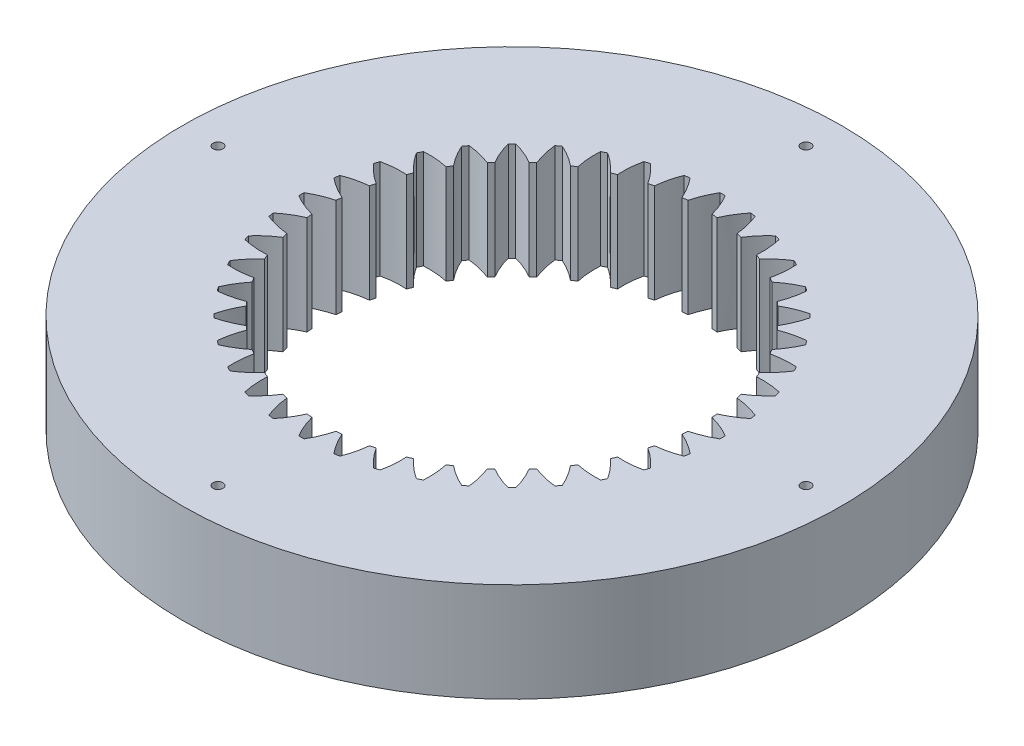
SolidWorks part; units mm, degrees
ref_plane "Front Plane" through (0, 0, 0) normal (0, 0, 1) x (1, 0, 0)
ref_plane "Top Plane" through (0, 0, 0) normal (0, 1, 0) x (1, 0, 0)
ref_plane "Right Plane" through (0, 0, 0) normal (1, 0, 0) x (0, 0, -1)
sketch "Sketch1" plane through (0, 0, 0) normal (0, 1, 0) x (1, 0, 0)
  line L0 (0, 99.75) -> (0, 63.751) construction
  line L1 (0, 57) -> (0, 0) construction
  circle A0 centre (0, 0) radius 99.75
  arc A1 (-3.6463, 56.8833) -> (-5.2971, 56.7533) centre (0, 0) ccw
  arc A2 (0.8004, 63.746) -> (-0.8004, 63.746) centre (0, 0) ccw
  arc A3 (-3.6463, 56.8833) -> (-5.2971, 56.7533) centre (0, 0) ccw
  arc A4 (-3.6463, 56.8833) -> (-5.2971, 56.7533) centre (0, 0) ccw
  arc A5 (-3.6463, 56.8833) -> (-5.2971, 56.7533) centre (0, 0) ccw
  arc A6 (-3.6463, 56.8833) -> (-5.2971, 56.7533) centre (0, 0) ccw
  arc A7 (-3.6463, 56.8833) -> (-5.2971, 56.7533) centre (0, 0) ccw
  arc A8 (-3.6463, 56.8833) -> (-5.2971, 56.7533) centre (0, 0) ccw
  arc A9 (-3.6463, 56.8833) -> (-5.2971, 56.7533) centre (0, 0) ccw
  arc A10 (-3.6463, 56.8833) -> (-5.2971, 56.7533) centre (0, 0) ccw
  arc A11 (-3.6463, 56.8833) -> (-5.2971, 56.7533) centre (0, 0) ccw
  arc A12 (-3.6463, 56.8833) -> (-5.2971, 56.7533) centre (0, 0) ccw
  arc A13 (-3.6463, 56.8833) -> (-5.2971, 56.7533) centre (0, 0) ccw
  arc A14 (-3.6463, 56.8833) -> (-5.2971, 56.7533) centre (0, 0) ccw
  arc A15 (-3.6463, 56.8833) -> (-5.2971, 56.7533) centre (0, 0) ccw
  arc A16 (-3.6463, 56.8833) -> (-5.2971, 56.7533) centre (0, 0) ccw
  arc A17 (-3.6463, 56.8833) -> (-5.2971, 56.7533) centre (0, 0) ccw
  arc A18 (-3.6463, 56.8833) -> (-5.2971, 56.7533) centre (0, 0) ccw
  arc A19 (-3.6463, 56.8833) -> (-5.2971, 56.7533) centre (0, 0) ccw
  arc A20 (-3.6463, 56.8833) -> (-5.2971, 56.7533) centre (0, 0) ccw
  arc A21 (-3.6463, 56.8833) -> (-5.2971, 56.7533) centre (0, 0) ccw
  arc A22 (-3.6463, 56.8833) -> (-5.2971, 56.7533) centre (0, 0) ccw
  arc A23 (-3.6463, 56.8833) -> (-5.2971, 56.7533) centre (0, 0) ccw
  arc A24 (-3.6463, 56.8833) -> (-5.2971, 56.7533) centre (0, 0) ccw
  arc A25 (-3.6463, 56.8833) -> (-5.2971, 56.7533) centre (0, 0) ccw
  arc A26 (-3.6463, 56.8833) -> (-5.2971, 56.7533) centre (0, 0) ccw
  arc A27 (-3.6463, 56.8833) -> (-5.2971, 56.7533) centre (0, 0) ccw
  arc A28 (-3.6463, 56.8833) -> (-5.2971, 56.7533) centre (0, 0) ccw
  arc A29 (-3.6463, 56.8833) -> (-5.2971, 56.7533) centre (0, 0) ccw
  arc A30 (-3.6463, 56.8833) -> (-5.2971, 56.7533) centre (0, 0) ccw
  arc A31 (-3.6463, 56.8833) -> (-5.2971, 56.7533) centre (0, 0) ccw
  arc A32 (-3.6463, 56.8833) -> (-5.2971, 56.7533) centre (0, 0) ccw
  arc A33 (-3.6463, 56.8833) -> (-5.2971, 56.7533) centre (0, 0) ccw
  arc A34 (-3.6463, 56.8833) -> (-5.2971, 56.7533) centre (0, 0) ccw
  arc A35 (-3.6463, 56.8833) -> (-5.2971, 56.7533) centre (0, 0) ccw
  arc A36 (-3.6463, 56.8833) -> (-5.2971, 56.7533) centre (0, 0) ccw
  arc A37 (-3.6463, 56.8833) -> (-5.2971, 56.7533) centre (0, 0) ccw
  arc A38 (-3.6463, 56.8833) -> (-5.2971, 56.7533) centre (0, 0) ccw
  arc A39 (-3.6463, 56.8833) -> (-5.2971, 56.7533) centre (0, 0) ccw
  arc A40 (-3.6463, 56.8833) -> (-5.2971, 56.7533) centre (0, 0) ccw
  arc A41 (-3.6463, 56.8833) -> (-5.2971, 56.7533) centre (0, 0) ccw
  arc A42 (5.2971, 56.7533) -> (3.6463, 56.8833) centre (0, 0) ccw
  arc A43 (5.2971, 56.7533) -> (3.6463, 56.8833) centre (0, 0) ccw
  arc A44 (5.2971, 56.7533) -> (3.6463, 56.8833) centre (0, 0) ccw
  arc A45 (5.2971, 56.7533) -> (3.6463, 56.8833) centre (0, 0) ccw
  arc A46 (5.2971, 56.7533) -> (3.6463, 56.8833) centre (0, 0) ccw
  arc A47 (5.2971, 56.7533) -> (3.6463, 56.8833) centre (0, 0) ccw
  arc A48 (5.2971, 56.7533) -> (3.6463, 56.8833) centre (0, 0) ccw
  arc A49 (5.2971, 56.7533) -> (3.6463, 56.8833) centre (0, 0) ccw
  arc A50 (5.2971, 56.7533) -> (3.6463, 56.8833) centre (0, 0) ccw
  arc A51 (5.2971, 56.7533) -> (3.6463, 56.8833) centre (0, 0) ccw
  arc A52 (5.2971, 56.7533) -> (3.6463, 56.8833) centre (0, 0) ccw
  arc A53 (5.2971, 56.7533) -> (3.6463, 56.8833) centre (0, 0) ccw
  arc A54 (5.2971, 56.7533) -> (3.6463, 56.8833) centre (0, 0) ccw
  arc A55 (5.2971, 56.7533) -> (3.6463, 56.8833) centre (0, 0) ccw
  arc A56 (5.2971, 56.7533) -> (3.6463, 56.8833) centre (0, 0) ccw
  arc A57 (5.2971, 56.7533) -> (3.6463, 56.8833) centre (0, 0) ccw
  arc A58 (5.2971, 56.7533) -> (3.6463, 56.8833) centre (0, 0) ccw
  arc A59 (5.2971, 56.7533) -> (3.6463, 56.8833) centre (0, 0) ccw
  arc A60 (5.2971, 56.7533) -> (3.6463, 56.8833) centre (0, 0) ccw
  arc A61 (5.2971, 56.7533) -> (3.6463, 56.8833) centre (0, 0) ccw
  arc A62 (5.2971, 56.7533) -> (3.6463, 56.8833) centre (0, 0) ccw
  arc A63 (5.2971, 56.7533) -> (3.6463, 56.8833) centre (0, 0) ccw
  arc A64 (5.2971, 56.7533) -> (3.6463, 56.8833) centre (0, 0) ccw
  arc A65 (5.2971, 56.7533) -> (3.6463, 56.8833) centre (0, 0) ccw
  arc A66 (5.2971, 56.7533) -> (3.6463, 56.8833) centre (0, 0) ccw
  arc A67 (5.2971, 56.7533) -> (3.6463, 56.8833) centre (0, 0) ccw
  arc A68 (5.2971, 56.7533) -> (3.6463, 56.8833) centre (0, 0) ccw
  arc A69 (5.2971, 56.7533) -> (3.6463, 56.8833) centre (0, 0) ccw
  arc A70 (5.2971, 56.7533) -> (3.6463, 56.8833) centre (0, 0) ccw
  arc A71 (5.2971, 56.7533) -> (3.6463, 56.8833) centre (0, 0) ccw
  arc A72 (5.2971, 56.7533) -> (3.6463, 56.8833) centre (0, 0) ccw
  arc A73 (5.2971, 56.7533) -> (3.6463, 56.8833) centre (0, 0) ccw
  arc A74 (5.2971, 56.7533) -> (3.6463, 56.8833) centre (0, 0) ccw
  arc A75 (5.2971, 56.7533) -> (3.6463, 56.8833) centre (0, 0) ccw
  arc A76 (5.2971, 56.7533) -> (3.6463, 56.8833) centre (0, 0) ccw
  arc A77 (5.2971, 56.7533) -> (3.6463, 56.8833) centre (0, 0) ccw
  arc A78 (5.2971, 56.7533) -> (3.6463, 56.8833) centre (0, 0) ccw
  arc A79 (5.2971, 56.7533) -> (3.6463, 56.8833) centre (0, 0) ccw
  arc A80 (5.2971, 56.7533) -> (3.6463, 56.8833) centre (0, 0) ccw
  arc A81 (5.2971, 56.7533) -> (3.6463, 56.8833) centre (0, 0) ccw
  arc A82 (10.7626, 62.836) -> (9.1816, 63.0864) centre (0, 0) ccw
  arc A83 (14.11, 55.226) -> (12.4999, 55.6125) centre (0, 0) ccw
  arc A84 (14.11, 55.226) -> (12.4999, 55.6125) centre (0, 0) ccw
  arc A85 (14.11, 55.226) -> (12.4999, 55.6125) centre (0, 0) ccw
  arc A86 (14.11, 55.226) -> (12.4999, 55.6125) centre (0, 0) ccw
  arc A87 (14.11, 55.226) -> (12.4999, 55.6125) centre (0, 0) ccw
  arc A88 (14.11, 55.226) -> (12.4999, 55.6125) centre (0, 0) ccw
  arc A89 (14.11, 55.226) -> (12.4999, 55.6125) centre (0, 0) ccw
  arc A90 (14.11, 55.226) -> (12.4999, 55.6125) centre (0, 0) ccw
  arc A91 (14.11, 55.226) -> (12.4999, 55.6125) centre (0, 0) ccw
  arc A92 (14.11, 55.226) -> (12.4999, 55.6125) centre (0, 0) ccw
  arc A93 (14.11, 55.226) -> (12.4999, 55.6125) centre (0, 0) ccw
  arc A94 (14.11, 55.226) -> (12.4999, 55.6125) centre (0, 0) ccw
  arc A95 (14.11, 55.226) -> (12.4999, 55.6125) centre (0, 0) ccw
  arc A96 (14.11, 55.226) -> (12.4999, 55.6125) centre (0, 0) ccw
  arc A97 (14.11, 55.226) -> (12.4999, 55.6125) centre (0, 0) ccw
  arc A98 (14.11, 55.226) -> (12.4999, 55.6125) centre (0, 0) ccw
  arc A99 (14.11, 55.226) -> (12.4999, 55.6125) centre (0, 0) ccw
  arc A100 (14.11, 55.226) -> (12.4999, 55.6125) centre (0, 0) ccw
  arc A101 (14.11, 55.226) -> (12.4999, 55.6125) centre (0, 0) ccw
  arc A102 (14.11, 55.226) -> (12.4999, 55.6125) centre (0, 0) ccw
  arc A103 (14.11, 55.226) -> (12.4999, 55.6125) centre (0, 0) ccw
  arc A104 (14.11, 55.226) -> (12.4999, 55.6125) centre (0, 0) ccw
  arc A105 (14.11, 55.226) -> (12.4999, 55.6125) centre (0, 0) ccw
  arc A106 (14.11, 55.226) -> (12.4999, 55.6125) centre (0, 0) ccw
  arc A107 (14.11, 55.226) -> (12.4999, 55.6125) centre (0, 0) ccw
  arc A108 (14.11, 55.226) -> (12.4999, 55.6125) centre (0, 0) ccw
  arc A109 (14.11, 55.226) -> (12.4999, 55.6125) centre (0, 0) ccw
  arc A110 (14.11, 55.226) -> (12.4999, 55.6125) centre (0, 0) ccw
  arc A111 (14.11, 55.226) -> (12.4999, 55.6125) centre (0, 0) ccw
  arc A112 (14.11, 55.226) -> (12.4999, 55.6125) centre (0, 0) ccw
  arc A113 (14.11, 55.226) -> (12.4999, 55.6125) centre (0, 0) ccw
  arc A114 (14.11, 55.226) -> (12.4999, 55.6125) centre (0, 0) ccw
  arc A115 (14.11, 55.226) -> (12.4999, 55.6125) centre (0, 0) ccw
  arc A116 (14.11, 55.226) -> (12.4999, 55.6125) centre (0, 0) ccw
  arc A117 (14.11, 55.226) -> (12.4999, 55.6125) centre (0, 0) ccw
  arc A118 (14.11, 55.226) -> (12.4999, 55.6125) centre (0, 0) ccw
  arc A119 (14.11, 55.226) -> (12.4999, 55.6125) centre (0, 0) ccw
  arc A120 (14.11, 55.226) -> (12.4999, 55.6125) centre (0, 0) ccw
  arc A121 (14.11, 55.226) -> (12.4999, 55.6125) centre (0, 0) ccw
  arc A122 (14.11, 55.226) -> (12.4999, 55.6125) centre (0, 0) ccw
  arc A123 (20.4598, 60.3787) -> (18.9374, 60.8734) centre (0, 0) ccw
  arc A124 (29.6532, 56.4347) -> (28.2269, 57.1614) centre (0, 0) ccw
  arc A125 (38.1165, 51.1011) -> (36.8214, 52.042) centre (0, 0) ccw
  arc A126 (45.6412, 44.5093) -> (44.5093, 45.6412) centre (0, 0) ccw
  arc A127 (52.042, 36.8214) -> (51.1011, 38.1165) centre (0, 0) ccw
  arc A128 (57.1614, 28.2269) -> (56.4347, 29.6532) centre (0, 0) ccw
  arc A129 (60.8734, 18.9374) -> (60.3787, 20.4598) centre (0, 0) ccw
  arc A130 (63.0864, 9.1816) -> (62.836, 10.7626) centre (0, 0) ccw
  arc A131 (63.746, -0.8004) -> (63.746, 0.8004) centre (0, 0) ccw
  arc A132 (62.836, -10.7626) -> (63.0864, -9.1816) centre (0, 0) ccw
  arc A133 (60.3787, -20.4598) -> (60.8734, -18.9374) centre (0, 0) ccw
  arc A134 (56.4347, -29.6532) -> (57.1614, -28.2269) centre (0, 0) ccw
  arc A135 (51.1011, -38.1165) -> (52.042, -36.8214) centre (0, 0) ccw
  arc A136 (44.5093, -45.6412) -> (45.6412, -44.5093) centre (0, 0) ccw
  arc A137 (36.8214, -52.042) -> (38.1165, -51.1011) centre (0, 0) ccw
  arc A138 (28.2269, -57.1614) -> (29.6532, -56.4347) centre (0, 0) ccw
  arc A139 (18.9374, -60.8734) -> (20.4598, -60.3787) centre (0, 0) ccw
  arc A140 (9.1816, -63.0864) -> (10.7626, -62.836) centre (0, 0) ccw
  arc A141 (-0.8004, -63.746) -> (0.8004, -63.746) centre (0, 0) ccw
  arc A142 (-10.7626, -62.836) -> (-9.1816, -63.0864) centre (0, 0) ccw
  arc A143 (-20.4598, -60.3787) -> (-18.9374, -60.8734) centre (0, 0) ccw
  arc A144 (-29.6532, -56.4347) -> (-28.2269, -57.1614) centre (0, 0) ccw
  arc A145 (-38.1165, -51.1011) -> (-36.8214, -52.042) centre (0, 0) ccw
  arc A146 (-45.6412, -44.5093) -> (-44.5093, -45.6412) centre (0, 0) ccw
  arc A147 (-52.042, -36.8214) -> (-51.1011, -38.1165) centre (0, 0) ccw
  arc A148 (-57.1614, -28.2269) -> (-56.4347, -29.6532) centre (0, 0) ccw
  arc A149 (-60.8734, -18.9374) -> (-60.3787, -20.4598) centre (0, 0) ccw
  arc A150 (-63.0864, -9.1816) -> (-62.836, -10.7626) centre (0, 0) ccw
  arc A151 (-63.746, 0.8004) -> (-63.746, -0.8004) centre (0, 0) ccw
  arc A152 (-62.836, 10.7626) -> (-63.0864, 9.1816) centre (0, 0) ccw
  arc A153 (-60.3787, 20.4598) -> (-60.8734, 18.9374) centre (0, 0) ccw
  arc A154 (-56.4347, 29.6532) -> (-57.1614, 28.2269) centre (0, 0) ccw
  arc A155 (-51.1011, 38.1165) -> (-52.042, 36.8214) centre (0, 0) ccw
  arc A156 (-44.5093, 45.6412) -> (-45.6412, 44.5093) centre (0, 0) ccw
  arc A157 (-36.8214, 52.042) -> (-38.1165, 51.1011) centre (0, 0) ccw
  arc A158 (-28.2269, 57.1614) -> (-29.6532, 56.4347) centre (0, 0) ccw
  arc A159 (-9.1816, 63.0864) -> (-10.7626, 62.836) centre (0, 0) ccw
  arc A160 (-18.9374, 60.8734) -> (-20.4598, 60.3787) centre (0, 0) ccw
  arc A161 (-29.0734, 49.028) -> (-30.4852, 48.1628) centre (0, 0) ccw
  arc A162 (-29.0734, 49.028) -> (-30.4852, 48.1628) centre (0, 0) ccw
  arc A163 (-29.0734, 49.028) -> (-30.4852, 48.1628) centre (0, 0) ccw
  arc A164 (-29.0734, 49.028) -> (-30.4852, 48.1628) centre (0, 0) ccw
  arc A165 (-29.0734, 49.028) -> (-30.4852, 48.1628) centre (0, 0) ccw
  arc A166 (-29.0734, 49.028) -> (-30.4852, 48.1628) centre (0, 0) ccw
  arc A167 (-29.0734, 49.028) -> (-30.4852, 48.1628) centre (0, 0) ccw
  arc A168 (-29.0734, 49.028) -> (-30.4852, 48.1628) centre (0, 0) ccw
  arc A169 (-29.0734, 49.028) -> (-30.4852, 48.1628) centre (0, 0) ccw
  arc A170 (-29.0734, 49.028) -> (-30.4852, 48.1628) centre (0, 0) ccw
  arc A171 (-29.0734, 49.028) -> (-30.4852, 48.1628) centre (0, 0) ccw
  arc A172 (-29.0734, 49.028) -> (-30.4852, 48.1628) centre (0, 0) ccw
  arc A173 (-29.0734, 49.028) -> (-30.4852, 48.1628) centre (0, 0) ccw
  arc A174 (-29.0734, 49.028) -> (-30.4852, 48.1628) centre (0, 0) ccw
  arc A175 (-29.0734, 49.028) -> (-30.4852, 48.1628) centre (0, 0) ccw
  arc A176 (-29.0734, 49.028) -> (-30.4852, 48.1628) centre (0, 0) ccw
  arc A177 (-29.0734, 49.028) -> (-30.4852, 48.1628) centre (0, 0) ccw
  arc A178 (-29.0734, 49.028) -> (-30.4852, 48.1628) centre (0, 0) ccw
  arc A179 (-29.0734, 49.028) -> (-30.4852, 48.1628) centre (0, 0) ccw
  arc A180 (-29.0734, 49.028) -> (-30.4852, 48.1628) centre (0, 0) ccw
  arc A181 (-29.0734, 49.028) -> (-30.4852, 48.1628) centre (0, 0) ccw
  arc A182 (-29.0734, 49.028) -> (-30.4852, 48.1628) centre (0, 0) ccw
  arc A183 (-29.0734, 49.028) -> (-30.4852, 48.1628) centre (0, 0) ccw
  arc A184 (-29.0734, 49.028) -> (-30.4852, 48.1628) centre (0, 0) ccw
  arc A185 (-29.0734, 49.028) -> (-30.4852, 48.1628) centre (0, 0) ccw
  arc A186 (-29.0734, 49.028) -> (-30.4852, 48.1628) centre (0, 0) ccw
  arc A187 (-29.0734, 49.028) -> (-30.4852, 48.1628) centre (0, 0) ccw
  arc A188 (-29.0734, 49.028) -> (-30.4852, 48.1628) centre (0, 0) ccw
  arc A189 (-29.0734, 49.028) -> (-30.4852, 48.1628) centre (0, 0) ccw
  arc A190 (-29.0734, 49.028) -> (-30.4852, 48.1628) centre (0, 0) ccw
  arc A191 (-29.0734, 49.028) -> (-30.4852, 48.1628) centre (0, 0) ccw
  arc A192 (-29.0734, 49.028) -> (-30.4852, 48.1628) centre (0, 0) ccw
  arc A193 (-29.0734, 49.028) -> (-30.4852, 48.1628) centre (0, 0) ccw
  arc A194 (-29.0734, 49.028) -> (-30.4852, 48.1628) centre (0, 0) ccw
  arc A195 (-29.0734, 49.028) -> (-30.4852, 48.1628) centre (0, 0) ccw
  arc A196 (-29.0734, 49.028) -> (-30.4852, 48.1628) centre (0, 0) ccw
  arc A197 (-29.0734, 49.028) -> (-30.4852, 48.1628) centre (0, 0) ccw
  arc A198 (-29.0734, 49.028) -> (-30.4852, 48.1628) centre (0, 0) ccw
  arc A199 (-29.0734, 49.028) -> (-30.4852, 48.1628) centre (0, 0) ccw
  arc A200 (-29.0734, 49.028) -> (-30.4852, 48.1628) centre (0, 0) ccw
  arc A201 (-12.4999, 55.6125) -> (-14.11, 55.226) centre (0, 0) ccw
  arc A202 (-12.4999, 55.6125) -> (-14.11, 55.226) centre (0, 0) ccw
  arc A203 (-12.4999, 55.6125) -> (-14.11, 55.226) centre (0, 0) ccw
  arc A204 (-12.4999, 55.6125) -> (-14.11, 55.226) centre (0, 0) ccw
  arc A205 (-12.4999, 55.6125) -> (-14.11, 55.226) centre (0, 0) ccw
  arc A206 (-12.4999, 55.6125) -> (-14.11, 55.226) centre (0, 0) ccw
  arc A207 (-12.4999, 55.6125) -> (-14.11, 55.226) centre (0, 0) ccw
  arc A208 (-12.4999, 55.6125) -> (-14.11, 55.226) centre (0, 0) ccw
  arc A209 (-12.4999, 55.6125) -> (-14.11, 55.226) centre (0, 0) ccw
  arc A210 (-12.4999, 55.6125) -> (-14.11, 55.226) centre (0, 0) ccw
  arc A211 (-12.4999, 55.6125) -> (-14.11, 55.226) centre (0, 0) ccw
  arc A212 (-12.4999, 55.6125) -> (-14.11, 55.226) centre (0, 0) ccw
  arc A213 (-12.4999, 55.6125) -> (-14.11, 55.226) centre (0, 0) ccw
  arc A214 (-12.4999, 55.6125) -> (-14.11, 55.226) centre (0, 0) ccw
  arc A215 (-12.4999, 55.6125) -> (-14.11, 55.226) centre (0, 0) ccw
  arc A216 (-12.4999, 55.6125) -> (-14.11, 55.226) centre (0, 0) ccw
  arc A217 (-12.4999, 55.6125) -> (-14.11, 55.226) centre (0, 0) ccw
  arc A218 (-12.4999, 55.6125) -> (-14.11, 55.226) centre (0, 0) ccw
  arc A219 (-12.4999, 55.6125) -> (-14.11, 55.226) centre (0, 0) ccw
  arc A220 (-12.4999, 55.6125) -> (-14.11, 55.226) centre (0, 0) ccw
  arc A221 (-12.4999, 55.6125) -> (-14.11, 55.226) centre (0, 0) ccw
  arc A222 (-12.4999, 55.6125) -> (-14.11, 55.226) centre (0, 0) ccw
  arc A223 (-12.4999, 55.6125) -> (-14.11, 55.226) centre (0, 0) ccw
  arc A224 (-12.4999, 55.6125) -> (-14.11, 55.226) centre (0, 0) ccw
  arc A225 (-12.4999, 55.6125) -> (-14.11, 55.226) centre (0, 0) ccw
  arc A226 (-12.4999, 55.6125) -> (-14.11, 55.226) centre (0, 0) ccw
  arc A227 (-12.4999, 55.6125) -> (-14.11, 55.226) centre (0, 0) ccw
  arc A228 (-12.4999, 55.6125) -> (-14.11, 55.226) centre (0, 0) ccw
  arc A229 (-12.4999, 55.6125) -> (-14.11, 55.226) centre (0, 0) ccw
  arc A230 (-12.4999, 55.6125) -> (-14.11, 55.226) centre (0, 0) ccw
  arc A231 (-12.4999, 55.6125) -> (-14.11, 55.226) centre (0, 0) ccw
  arc A232 (-12.4999, 55.6125) -> (-14.11, 55.226) centre (0, 0) ccw
  arc A233 (-12.4999, 55.6125) -> (-14.11, 55.226) centre (0, 0) ccw
  arc A234 (-12.4999, 55.6125) -> (-14.11, 55.226) centre (0, 0) ccw
  arc A235 (-12.4999, 55.6125) -> (-14.11, 55.226) centre (0, 0) ccw
  arc A236 (-12.4999, 55.6125) -> (-14.11, 55.226) centre (0, 0) ccw
  arc A237 (-12.4999, 55.6125) -> (-14.11, 55.226) centre (0, 0) ccw
  arc A238 (-12.4999, 55.6125) -> (-14.11, 55.226) centre (0, 0) ccw
  arc A239 (-12.4999, 55.6125) -> (-14.11, 55.226) centre (0, 0) ccw
  arc A240 (-12.4999, 55.6125) -> (-14.11, 55.226) centre (0, 0) ccw
  arc A241 (-21.0457, 52.9724) -> (-22.5756, 52.3387) centre (0, 0) ccw
  arc A242 (-21.0457, 52.9724) -> (-22.5756, 52.3387) centre (0, 0) ccw
  arc A243 (-21.0457, 52.9724) -> (-22.5756, 52.3387) centre (0, 0) ccw
  arc A244 (-21.0457, 52.9724) -> (-22.5756, 52.3387) centre (0, 0) ccw
  arc A245 (-21.0457, 52.9724) -> (-22.5756, 52.3387) centre (0, 0) ccw
  arc A246 (-21.0457, 52.9724) -> (-22.5756, 52.3387) centre (0, 0) ccw
  arc A247 (-21.0457, 52.9724) -> (-22.5756, 52.3387) centre (0, 0) ccw
  arc A248 (-21.0457, 52.9724) -> (-22.5756, 52.3387) centre (0, 0) ccw
  arc A249 (-21.0457, 52.9724) -> (-22.5756, 52.3387) centre (0, 0) ccw
  arc A250 (-21.0457, 52.9724) -> (-22.5756, 52.3387) centre (0, 0) ccw
  arc A251 (-21.0457, 52.9724) -> (-22.5756, 52.3387) centre (0, 0) ccw
  arc A252 (-21.0457, 52.9724) -> (-22.5756, 52.3387) centre (0, 0) ccw
  arc A253 (-21.0457, 52.9724) -> (-22.5756, 52.3387) centre (0, 0) ccw
  arc A254 (-21.0457, 52.9724) -> (-22.5756, 52.3387) centre (0, 0) ccw
  arc A255 (-21.0457, 52.9724) -> (-22.5756, 52.3387) centre (0, 0) ccw
  arc A256 (-21.0457, 52.9724) -> (-22.5756, 52.3387) centre (0, 0) ccw
  arc A257 (-21.0457, 52.9724) -> (-22.5756, 52.3387) centre (0, 0) ccw
  arc A258 (-21.0457, 52.9724) -> (-22.5756, 52.3387) centre (0, 0) ccw
  arc A259 (-21.0457, 52.9724) -> (-22.5756, 52.3387) centre (0, 0) ccw
  arc A260 (-21.0457, 52.9724) -> (-22.5756, 52.3387) centre (0, 0) ccw
  arc A261 (-21.0457, 52.9724) -> (-22.5756, 52.3387) centre (0, 0) ccw
  arc A262 (-21.0457, 52.9724) -> (-22.5756, 52.3387) centre (0, 0) ccw
  arc A263 (-21.0457, 52.9724) -> (-22.5756, 52.3387) centre (0, 0) ccw
  arc A264 (-21.0457, 52.9724) -> (-22.5756, 52.3387) centre (0, 0) ccw
  arc A265 (-21.0457, 52.9724) -> (-22.5756, 52.3387) centre (0, 0) ccw
  arc A266 (-21.0457, 52.9724) -> (-22.5756, 52.3387) centre (0, 0) ccw
  arc A267 (-21.0457, 52.9724) -> (-22.5756, 52.3387) centre (0, 0) ccw
  arc A268 (-21.0457, 52.9724) -> (-22.5756, 52.3387) centre (0, 0) ccw
  arc A269 (-21.0457, 52.9724) -> (-22.5756, 52.3387) centre (0, 0) ccw
  arc A270 (-21.0457, 52.9724) -> (-22.5756, 52.3387) centre (0, 0) ccw
  arc A271 (-21.0457, 52.9724) -> (-22.5756, 52.3387) centre (0, 0) ccw
  arc A272 (-21.0457, 52.9724) -> (-22.5756, 52.3387) centre (0, 0) ccw
  arc A273 (-21.0457, 52.9724) -> (-22.5756, 52.3387) centre (0, 0) ccw
  arc A274 (-21.0457, 52.9724) -> (-22.5756, 52.3387) centre (0, 0) ccw
  arc A275 (-21.0457, 52.9724) -> (-22.5756, 52.3387) centre (0, 0) ccw
  arc A276 (-21.0457, 52.9724) -> (-22.5756, 52.3387) centre (0, 0) ccw
  arc A277 (-21.0457, 52.9724) -> (-22.5756, 52.3387) centre (0, 0) ccw
  arc A278 (-21.0457, 52.9724) -> (-22.5756, 52.3387) centre (0, 0) ccw
  arc A279 (-21.0457, 52.9724) -> (-22.5756, 52.3387) centre (0, 0) ccw
  arc A280 (-21.0457, 52.9724) -> (-22.5756, 52.3387) centre (0, 0) ccw
  arc A281 (-36.3851, 43.8763) -> (-37.6442, 42.8009) centre (0, 0) ccw
  arc A282 (-36.3851, 43.8763) -> (-37.6442, 42.8009) centre (0, 0) ccw
  arc A283 (-36.3851, 43.8763) -> (-37.6442, 42.8009) centre (0, 0) ccw
  arc A284 (-36.3851, 43.8763) -> (-37.6442, 42.8009) centre (0, 0) ccw
  arc A285 (-36.3851, 43.8763) -> (-37.6442, 42.8009) centre (0, 0) ccw
  arc A286 (-36.3851, 43.8763) -> (-37.6442, 42.8009) centre (0, 0) ccw
  arc A287 (-36.3851, 43.8763) -> (-37.6442, 42.8009) centre (0, 0) ccw
  arc A288 (-36.3851, 43.8763) -> (-37.6442, 42.8009) centre (0, 0) ccw
  arc A289 (-36.3851, 43.8763) -> (-37.6442, 42.8009) centre (0, 0) ccw
  arc A290 (-36.3851, 43.8763) -> (-37.6442, 42.8009) centre (0, 0) ccw
  arc A291 (-36.3851, 43.8763) -> (-37.6442, 42.8009) centre (0, 0) ccw
  arc A292 (-36.3851, 43.8763) -> (-37.6442, 42.8009) centre (0, 0) ccw
  arc A293 (-36.3851, 43.8763) -> (-37.6442, 42.8009) centre (0, 0) ccw
  arc A294 (-36.3851, 43.8763) -> (-37.6442, 42.8009) centre (0, 0) ccw
  arc A295 (-36.3851, 43.8763) -> (-37.6442, 42.8009) centre (0, 0) ccw
  arc A296 (-36.3851, 43.8763) -> (-37.6442, 42.8009) centre (0, 0) ccw
  arc A297 (-36.3851, 43.8763) -> (-37.6442, 42.8009) centre (0, 0) ccw
  arc A298 (-36.3851, 43.8763) -> (-37.6442, 42.8009) centre (0, 0) ccw
  arc A299 (-36.3851, 43.8763) -> (-37.6442, 42.8009) centre (0, 0) ccw
  arc A300 (-36.3851, 43.8763) -> (-37.6442, 42.8009) centre (0, 0) ccw
  arc A301 (-36.3851, 43.8763) -> (-37.6442, 42.8009) centre (0, 0) ccw
  arc A302 (-36.3851, 43.8763) -> (-37.6442, 42.8009) centre (0, 0) ccw
  arc A303 (-36.3851, 43.8763) -> (-37.6442, 42.8009) centre (0, 0) ccw
  arc A304 (-36.3851, 43.8763) -> (-37.6442, 42.8009) centre (0, 0) ccw
  arc A305 (-36.3851, 43.8763) -> (-37.6442, 42.8009) centre (0, 0) ccw
  arc A306 (-36.3851, 43.8763) -> (-37.6442, 42.8009) centre (0, 0) ccw
  arc A307 (-36.3851, 43.8763) -> (-37.6442, 42.8009) centre (0, 0) ccw
  arc A308 (-36.3851, 43.8763) -> (-37.6442, 42.8009) centre (0, 0) ccw
  arc A309 (-36.3851, 43.8763) -> (-37.6442, 42.8009) centre (0, 0) ccw
  arc A310 (-36.3851, 43.8763) -> (-37.6442, 42.8009) centre (0, 0) ccw
  arc A311 (-36.3851, 43.8763) -> (-37.6442, 42.8009) centre (0, 0) ccw
  arc A312 (-36.3851, 43.8763) -> (-37.6442, 42.8009) centre (0, 0) ccw
  arc A313 (-36.3851, 43.8763) -> (-37.6442, 42.8009) centre (0, 0) ccw
  arc A314 (-36.3851, 43.8763) -> (-37.6442, 42.8009) centre (0, 0) ccw
  arc A315 (-36.3851, 43.8763) -> (-37.6442, 42.8009) centre (0, 0) ccw
  arc A316 (-36.3851, 43.8763) -> (-37.6442, 42.8009) centre (0, 0) ccw
  arc A317 (-36.3851, 43.8763) -> (-37.6442, 42.8009) centre (0, 0) ccw
  arc A318 (-36.3851, 43.8763) -> (-37.6442, 42.8009) centre (0, 0) ccw
  arc A319 (-36.3851, 43.8763) -> (-37.6442, 42.8009) centre (0, 0) ccw
  arc A320 (-36.3851, 43.8763) -> (-37.6442, 42.8009) centre (0, 0) ccw
  arc A321 (-52.3387, 22.5756) -> (-52.9724, 21.0457) centre (0, 0) ccw
  arc A322 (-52.3387, 22.5756) -> (-52.9724, 21.0457) centre (0, 0) ccw
  arc A323 (-52.3387, 22.5756) -> (-52.9724, 21.0457) centre (0, 0) ccw
  arc A324 (-52.3387, 22.5756) -> (-52.9724, 21.0457) centre (0, 0) ccw
  arc A325 (-52.3387, 22.5756) -> (-52.9724, 21.0457) centre (0, 0) ccw
  arc A326 (-52.3387, 22.5756) -> (-52.9724, 21.0457) centre (0, 0) ccw
  arc A327 (-52.3387, 22.5756) -> (-52.9724, 21.0457) centre (0, 0) ccw
  arc A328 (-52.3387, 22.5756) -> (-52.9724, 21.0457) centre (0, 0) ccw
  arc A329 (-52.3387, 22.5756) -> (-52.9724, 21.0457) centre (0, 0) ccw
  arc A330 (-52.3387, 22.5756) -> (-52.9724, 21.0457) centre (0, 0) ccw
  arc A331 (-52.3387, 22.5756) -> (-52.9724, 21.0457) centre (0, 0) ccw
  arc A332 (-52.3387, 22.5756) -> (-52.9724, 21.0457) centre (0, 0) ccw
  arc A333 (-52.3387, 22.5756) -> (-52.9724, 21.0457) centre (0, 0) ccw
  arc A334 (-52.3387, 22.5756) -> (-52.9724, 21.0457) centre (0, 0) ccw
  arc A335 (-52.3387, 22.5756) -> (-52.9724, 21.0457) centre (0, 0) ccw
  arc A336 (-52.3387, 22.5756) -> (-52.9724, 21.0457) centre (0, 0) ccw
  arc A337 (-52.3387, 22.5756) -> (-52.9724, 21.0457) centre (0, 0) ccw
  arc A338 (-52.3387, 22.5756) -> (-52.9724, 21.0457) centre (0, 0) ccw
  arc A339 (-52.3387, 22.5756) -> (-52.9724, 21.0457) centre (0, 0) ccw
  arc A340 (-52.3387, 22.5756) -> (-52.9724, 21.0457) centre (0, 0) ccw
  arc A341 (-52.3387, 22.5756) -> (-52.9724, 21.0457) centre (0, 0) ccw
  arc A342 (-52.3387, 22.5756) -> (-52.9724, 21.0457) centre (0, 0) ccw
  arc A343 (-52.3387, 22.5756) -> (-52.9724, 21.0457) centre (0, 0) ccw
  arc A344 (-52.3387, 22.5756) -> (-52.9724, 21.0457) centre (0, 0) ccw
  arc A345 (-52.3387, 22.5756) -> (-52.9724, 21.0457) centre (0, 0) ccw
  arc A346 (-52.3387, 22.5756) -> (-52.9724, 21.0457) centre (0, 0) ccw
  arc A347 (-52.3387, 22.5756) -> (-52.9724, 21.0457) centre (0, 0) ccw
  arc A348 (-52.3387, 22.5756) -> (-52.9724, 21.0457) centre (0, 0) ccw
  arc A349 (-52.3387, 22.5756) -> (-52.9724, 21.0457) centre (0, 0) ccw
  arc A350 (-52.3387, 22.5756) -> (-52.9724, 21.0457) centre (0, 0) ccw
  arc A351 (-52.3387, 22.5756) -> (-52.9724, 21.0457) centre (0, 0) ccw
  arc A352 (-52.3387, 22.5756) -> (-52.9724, 21.0457) centre (0, 0) ccw
  arc A353 (-52.3387, 22.5756) -> (-52.9724, 21.0457) centre (0, 0) ccw
  arc A354 (-52.3387, 22.5756) -> (-52.9724, 21.0457) centre (0, 0) ccw
  arc A355 (-52.3387, 22.5756) -> (-52.9724, 21.0457) centre (0, 0) ccw
  arc A356 (-52.3387, 22.5756) -> (-52.9724, 21.0457) centre (0, 0) ccw
  arc A357 (-52.3387, 22.5756) -> (-52.9724, 21.0457) centre (0, 0) ccw
  arc A358 (-52.3387, 22.5756) -> (-52.9724, 21.0457) centre (0, 0) ccw
  arc A359 (-52.3387, 22.5756) -> (-52.9724, 21.0457) centre (0, 0) ccw
  arc A360 (-52.3387, 22.5756) -> (-52.9724, 21.0457) centre (0, 0) ccw
  arc A361 (-42.8009, 37.6442) -> (-43.8763, 36.3851) centre (0, 0) ccw
  arc A362 (-42.8009, 37.6442) -> (-43.8763, 36.3851) centre (0, 0) ccw
  arc A363 (-42.8009, 37.6442) -> (-43.8763, 36.3851) centre (0, 0) ccw
  arc A364 (-42.8009, 37.6442) -> (-43.8763, 36.3851) centre (0, 0) ccw
  arc A365 (-42.8009, 37.6442) -> (-43.8763, 36.3851) centre (0, 0) ccw
  arc A366 (-42.8009, 37.6442) -> (-43.8763, 36.3851) centre (0, 0) ccw
  arc A367 (-42.8009, 37.6442) -> (-43.8763, 36.3851) centre (0, 0) ccw
  arc A368 (-42.8009, 37.6442) -> (-43.8763, 36.3851) centre (0, 0) ccw
  arc A369 (-42.8009, 37.6442) -> (-43.8763, 36.3851) centre (0, 0) ccw
  arc A370 (-42.8009, 37.6442) -> (-43.8763, 36.3851) centre (0, 0) ccw
  arc A371 (-42.8009, 37.6442) -> (-43.8763, 36.3851) centre (0, 0) ccw
  arc A372 (-42.8009, 37.6442) -> (-43.8763, 36.3851) centre (0, 0) ccw
  arc A373 (-42.8009, 37.6442) -> (-43.8763, 36.3851) centre (0, 0) ccw
  arc A374 (-42.8009, 37.6442) -> (-43.8763, 36.3851) centre (0, 0) ccw
  arc A375 (-42.8009, 37.6442) -> (-43.8763, 36.3851) centre (0, 0) ccw
  arc A376 (-42.8009, 37.6442) -> (-43.8763, 36.3851) centre (0, 0) ccw
  arc A377 (-42.8009, 37.6442) -> (-43.8763, 36.3851) centre (0, 0) ccw
  arc A378 (-42.8009, 37.6442) -> (-43.8763, 36.3851) centre (0, 0) ccw
  arc A379 (-42.8009, 37.6442) -> (-43.8763, 36.3851) centre (0, 0) ccw
  arc A380 (-42.8009, 37.6442) -> (-43.8763, 36.3851) centre (0, 0) ccw
  arc A381 (-42.8009, 37.6442) -> (-43.8763, 36.3851) centre (0, 0) ccw
  arc A382 (-42.8009, 37.6442) -> (-43.8763, 36.3851) centre (0, 0) ccw
  arc A383 (-42.8009, 37.6442) -> (-43.8763, 36.3851) centre (0, 0) ccw
  arc A384 (-42.8009, 37.6442) -> (-43.8763, 36.3851) centre (0, 0) ccw
  arc A385 (-42.8009, 37.6442) -> (-43.8763, 36.3851) centre (0, 0) ccw
  arc A386 (-42.8009, 37.6442) -> (-43.8763, 36.3851) centre (0, 0) ccw
  arc A387 (-42.8009, 37.6442) -> (-43.8763, 36.3851) centre (0, 0) ccw
  arc A388 (-42.8009, 37.6442) -> (-43.8763, 36.3851) centre (0, 0) ccw
  arc A389 (-42.8009, 37.6442) -> (-43.8763, 36.3851) centre (0, 0) ccw
  arc A390 (-42.8009, 37.6442) -> (-43.8763, 36.3851) centre (0, 0) ccw
  arc A391 (-42.8009, 37.6442) -> (-43.8763, 36.3851) centre (0, 0) ccw
  arc A392 (-42.8009, 37.6442) -> (-43.8763, 36.3851) centre (0, 0) ccw
  arc A393 (-42.8009, 37.6442) -> (-43.8763, 36.3851) centre (0, 0) ccw
  arc A394 (-42.8009, 37.6442) -> (-43.8763, 36.3851) centre (0, 0) ccw
  arc A395 (-42.8009, 37.6442) -> (-43.8763, 36.3851) centre (0, 0) ccw
  arc A396 (-42.8009, 37.6442) -> (-43.8763, 36.3851) centre (0, 0) ccw
  arc A397 (-42.8009, 37.6442) -> (-43.8763, 36.3851) centre (0, 0) ccw
  arc A398 (-42.8009, 37.6442) -> (-43.8763, 36.3851) centre (0, 0) ccw
  arc A399 (-42.8009, 37.6442) -> (-43.8763, 36.3851) centre (0, 0) ccw
  arc A400 (-42.8009, 37.6442) -> (-43.8763, 36.3851) centre (0, 0) ccw
  arc A401 (-48.1628, 30.4852) -> (-49.028, 29.0734) centre (0, 0) ccw
  arc A402 (-48.1628, 30.4852) -> (-49.028, 29.0734) centre (0, 0) ccw
  arc A403 (-48.1628, 30.4852) -> (-49.028, 29.0734) centre (0, 0) ccw
  arc A404 (-48.1628, 30.4852) -> (-49.028, 29.0734) centre (0, 0) ccw
  arc A405 (-48.1628, 30.4852) -> (-49.028, 29.0734) centre (0, 0) ccw
  arc A406 (-48.1628, 30.4852) -> (-49.028, 29.0734) centre (0, 0) ccw
  arc A407 (-48.1628, 30.4852) -> (-49.028, 29.0734) centre (0, 0) ccw
  arc A408 (-48.1628, 30.4852) -> (-49.028, 29.0734) centre (0, 0) ccw
  arc A409 (-48.1628, 30.4852) -> (-49.028, 29.0734) centre (0, 0) ccw
  arc A410 (-48.1628, 30.4852) -> (-49.028, 29.0734) centre (0, 0) ccw
  arc A411 (-48.1628, 30.4852) -> (-49.028, 29.0734) centre (0, 0) ccw
  arc A412 (-48.1628, 30.4852) -> (-49.028, 29.0734) centre (0, 0) ccw
  arc A413 (-48.1628, 30.4852) -> (-49.028, 29.0734) centre (0, 0) ccw
  arc A414 (-48.1628, 30.4852) -> (-49.028, 29.0734) centre (0, 0) ccw
  arc A415 (-48.1628, 30.4852) -> (-49.028, 29.0734) centre (0, 0) ccw
  arc A416 (-48.1628, 30.4852) -> (-49.028, 29.0734) centre (0, 0) ccw
  arc A417 (-48.1628, 30.4852) -> (-49.028, 29.0734) centre (0, 0) ccw
  arc A418 (-48.1628, 30.4852) -> (-49.028, 29.0734) centre (0, 0) ccw
  arc A419 (-48.1628, 30.4852) -> (-49.028, 29.0734) centre (0, 0) ccw
  arc A420 (-48.1628, 30.4852) -> (-49.028, 29.0734) centre (0, 0) ccw
  arc A421 (-48.1628, 30.4852) -> (-49.028, 29.0734) centre (0, 0) ccw
  arc A422 (-48.1628, 30.4852) -> (-49.028, 29.0734) centre (0, 0) ccw
  arc A423 (-48.1628, 30.4852) -> (-49.028, 29.0734) centre (0, 0) ccw
  arc A424 (-48.1628, 30.4852) -> (-49.028, 29.0734) centre (0, 0) ccw
  arc A425 (-48.1628, 30.4852) -> (-49.028, 29.0734) centre (0, 0) ccw
  arc A426 (-48.1628, 30.4852) -> (-49.028, 29.0734) centre (0, 0) ccw
  arc A427 (-48.1628, 30.4852) -> (-49.028, 29.0734) centre (0, 0) ccw
  arc A428 (-48.1628, 30.4852) -> (-49.028, 29.0734) centre (0, 0) ccw
  arc A429 (-48.1628, 30.4852) -> (-49.028, 29.0734) centre (0, 0) ccw
  arc A430 (-48.1628, 30.4852) -> (-49.028, 29.0734) centre (0, 0) ccw
  arc A431 (-48.1628, 30.4852) -> (-49.028, 29.0734) centre (0, 0) ccw
  arc A432 (-48.1628, 30.4852) -> (-49.028, 29.0734) centre (0, 0) ccw
  arc A433 (-48.1628, 30.4852) -> (-49.028, 29.0734) centre (0, 0) ccw
  arc A434 (-48.1628, 30.4852) -> (-49.028, 29.0734) centre (0, 0) ccw
  arc A435 (-48.1628, 30.4852) -> (-49.028, 29.0734) centre (0, 0) ccw
  arc A436 (-48.1628, 30.4852) -> (-49.028, 29.0734) centre (0, 0) ccw
  arc A437 (-48.1628, 30.4852) -> (-49.028, 29.0734) centre (0, 0) ccw
  arc A438 (-48.1628, 30.4852) -> (-49.028, 29.0734) centre (0, 0) ccw
  arc A439 (-48.1628, 30.4852) -> (-49.028, 29.0734) centre (0, 0) ccw
  arc A440 (-48.1628, 30.4852) -> (-49.028, 29.0734) centre (0, 0) ccw
  arc A441 (22.5756, 52.3387) -> (21.0457, 52.9724) centre (0, 0) ccw
  arc A442 (22.5756, 52.3387) -> (21.0457, 52.9724) centre (0, 0) ccw
  arc A443 (22.5756, 52.3387) -> (21.0457, 52.9724) centre (0, 0) ccw
  arc A444 (22.5756, 52.3387) -> (21.0457, 52.9724) centre (0, 0) ccw
  arc A445 (22.5756, 52.3387) -> (21.0457, 52.9724) centre (0, 0) ccw
  arc A446 (22.5756, 52.3387) -> (21.0457, 52.9724) centre (0, 0) ccw
  arc A447 (22.5756, 52.3387) -> (21.0457, 52.9724) centre (0, 0) ccw
  arc A448 (22.5756, 52.3387) -> (21.0457, 52.9724) centre (0, 0) ccw
  arc A449 (22.5756, 52.3387) -> (21.0457, 52.9724) centre (0, 0) ccw
  arc A450 (22.5756, 52.3387) -> (21.0457, 52.9724) centre (0, 0) ccw
  arc A451 (22.5756, 52.3387) -> (21.0457, 52.9724) centre (0, 0) ccw
  arc A452 (22.5756, 52.3387) -> (21.0457, 52.9724) centre (0, 0) ccw
  arc A453 (22.5756, 52.3387) -> (21.0457, 52.9724) centre (0, 0) ccw
  arc A454 (22.5756, 52.3387) -> (21.0457, 52.9724) centre (0, 0) ccw
  arc A455 (22.5756, 52.3387) -> (21.0457, 52.9724) centre (0, 0) ccw
  arc A456 (22.5756, 52.3387) -> (21.0457, 52.9724) centre (0, 0) ccw
  arc A457 (22.5756, 52.3387) -> (21.0457, 52.9724) centre (0, 0) ccw
  arc A458 (22.5756, 52.3387) -> (21.0457, 52.9724) centre (0, 0) ccw
  arc A459 (22.5756, 52.3387) -> (21.0457, 52.9724) centre (0, 0) ccw
  arc A460 (22.5756, 52.3387) -> (21.0457, 52.9724) centre (0, 0) ccw
  arc A461 (22.5756, 52.3387) -> (21.0457, 52.9724) centre (0, 0) ccw
  arc A462 (22.5756, 52.3387) -> (21.0457, 52.9724) centre (0, 0) ccw
  arc A463 (22.5756, 52.3387) -> (21.0457, 52.9724) centre (0, 0) ccw
  arc A464 (22.5756, 52.3387) -> (21.0457, 52.9724) centre (0, 0) ccw
  arc A465 (22.5756, 52.3387) -> (21.0457, 52.9724) centre (0, 0) ccw
  arc A466 (22.5756, 52.3387) -> (21.0457, 52.9724) centre (0, 0) ccw
  arc A467 (22.5756, 52.3387) -> (21.0457, 52.9724) centre (0, 0) ccw
  arc A468 (22.5756, 52.3387) -> (21.0457, 52.9724) centre (0, 0) ccw
  arc A469 (22.5756, 52.3387) -> (21.0457, 52.9724) centre (0, 0) ccw
  arc A470 (22.5756, 52.3387) -> (21.0457, 52.9724) centre (0, 0) ccw
  arc A471 (22.5756, 52.3387) -> (21.0457, 52.9724) centre (0, 0) ccw
  arc A472 (22.5756, 52.3387) -> (21.0457, 52.9724) centre (0, 0) ccw
  arc A473 (22.5756, 52.3387) -> (21.0457, 52.9724) centre (0, 0) ccw
  arc A474 (22.5756, 52.3387) -> (21.0457, 52.9724) centre (0, 0) ccw
  arc A475 (22.5756, 52.3387) -> (21.0457, 52.9724) centre (0, 0) ccw
  arc A476 (22.5756, 52.3387) -> (21.0457, 52.9724) centre (0, 0) ccw
  arc A477 (22.5756, 52.3387) -> (21.0457, 52.9724) centre (0, 0) ccw
  arc A478 (22.5756, 52.3387) -> (21.0457, 52.9724) centre (0, 0) ccw
  arc A479 (22.5756, 52.3387) -> (21.0457, 52.9724) centre (0, 0) ccw
  arc A480 (22.5756, 52.3387) -> (21.0457, 52.9724) centre (0, 0) ccw
  arc A481 (30.4852, 48.1628) -> (29.0734, 49.028) centre (0, 0) ccw
  arc A482 (30.4852, 48.1628) -> (29.0734, 49.028) centre (0, 0) ccw
  arc A483 (30.4852, 48.1628) -> (29.0734, 49.028) centre (0, 0) ccw
  arc A484 (30.4852, 48.1628) -> (29.0734, 49.028) centre (0, 0) ccw
  arc A485 (30.4852, 48.1628) -> (29.0734, 49.028) centre (0, 0) ccw
  arc A486 (30.4852, 48.1628) -> (29.0734, 49.028) centre (0, 0) ccw
  arc A487 (30.4852, 48.1628) -> (29.0734, 49.028) centre (0, 0) ccw
  arc A488 (30.4852, 48.1628) -> (29.0734, 49.028) centre (0, 0) ccw
  arc A489 (30.4852, 48.1628) -> (29.0734, 49.028) centre (0, 0) ccw
  arc A490 (30.4852, 48.1628) -> (29.0734, 49.028) centre (0, 0) ccw
  arc A491 (30.4852, 48.1628) -> (29.0734, 49.028) centre (0, 0) ccw
  arc A492 (30.4852, 48.1628) -> (29.0734, 49.028) centre (0, 0) ccw
  arc A493 (30.4852, 48.1628) -> (29.0734, 49.028) centre (0, 0) ccw
  arc A494 (30.4852, 48.1628) -> (29.0734, 49.028) centre (0, 0) ccw
  arc A495 (30.4852, 48.1628) -> (29.0734, 49.028) centre (0, 0) ccw
  arc A496 (30.4852, 48.1628) -> (29.0734, 49.028) centre (0, 0) ccw
  arc A497 (30.4852, 48.1628) -> (29.0734, 49.028) centre (0, 0) ccw
  arc A498 (30.4852, 48.1628) -> (29.0734, 49.028) centre (0, 0) ccw
  arc A499 (30.4852, 48.1628) -> (29.0734, 49.028) centre (0, 0) ccw
  arc A500 (30.4852, 48.1628) -> (29.0734, 49.028) centre (0, 0) ccw
  arc A501 (30.4852, 48.1628) -> (29.0734, 49.028) centre (0, 0) ccw
  arc A502 (30.4852, 48.1628) -> (29.0734, 49.028) centre (0, 0) ccw
  arc A503 (30.4852, 48.1628) -> (29.0734, 49.028) centre (0, 0) ccw
  arc A504 (30.4852, 48.1628) -> (29.0734, 49.028) centre (0, 0) ccw
  arc A505 (30.4852, 48.1628) -> (29.0734, 49.028) centre (0, 0) ccw
  arc A506 (30.4852, 48.1628) -> (29.0734, 49.028) centre (0, 0) ccw
  arc A507 (30.4852, 48.1628) -> (29.0734, 49.028) centre (0, 0) ccw
  arc A508 (30.4852, 48.1628) -> (29.0734, 49.028) centre (0, 0) ccw
  arc A509 (30.4852, 48.1628) -> (29.0734, 49.028) centre (0, 0) ccw
  arc A510 (30.4852, 48.1628) -> (29.0734, 49.028) centre (0, 0) ccw
  arc A511 (30.4852, 48.1628) -> (29.0734, 49.028) centre (0, 0) ccw
  arc A512 (30.4852, 48.1628) -> (29.0734, 49.028) centre (0, 0) ccw
  arc A513 (30.4852, 48.1628) -> (29.0734, 49.028) centre (0, 0) ccw
  arc A514 (30.4852, 48.1628) -> (29.0734, 49.028) centre (0, 0) ccw
  arc A515 (30.4852, 48.1628) -> (29.0734, 49.028) centre (0, 0) ccw
  arc A516 (30.4852, 48.1628) -> (29.0734, 49.028) centre (0, 0) ccw
  arc A517 (30.4852, 48.1628) -> (29.0734, 49.028) centre (0, 0) ccw
  arc A518 (30.4852, 48.1628) -> (29.0734, 49.028) centre (0, 0) ccw
  arc A519 (30.4852, 48.1628) -> (29.0734, 49.028) centre (0, 0) ccw
  arc A520 (30.4852, 48.1628) -> (29.0734, 49.028) centre (0, 0) ccw
  arc A521 (37.6442, 42.8009) -> (36.3851, 43.8763) centre (0, 0) ccw
  arc A522 (37.6442, 42.8009) -> (36.3851, 43.8763) centre (0, 0) ccw
  arc A523 (37.6442, 42.8009) -> (36.3851, 43.8763) centre (0, 0) ccw
  arc A524 (37.6442, 42.8009) -> (36.3851, 43.8763) centre (0, 0) ccw
  arc A525 (37.6442, 42.8009) -> (36.3851, 43.8763) centre (0, 0) ccw
  arc A526 (37.6442, 42.8009) -> (36.3851, 43.8763) centre (0, 0) ccw
  arc A527 (37.6442, 42.8009) -> (36.3851, 43.8763) centre (0, 0) ccw
  arc A528 (37.6442, 42.8009) -> (36.3851, 43.8763) centre (0, 0) ccw
  arc A529 (37.6442, 42.8009) -> (36.3851, 43.8763) centre (0, 0) ccw
  arc A530 (37.6442, 42.8009) -> (36.3851, 43.8763) centre (0, 0) ccw
  arc A531 (37.6442, 42.8009) -> (36.3851, 43.8763) centre (0, 0) ccw
  arc A532 (37.6442, 42.8009) -> (36.3851, 43.8763) centre (0, 0) ccw
  arc A533 (37.6442, 42.8009) -> (36.3851, 43.8763) centre (0, 0) ccw
  arc A534 (37.6442, 42.8009) -> (36.3851, 43.8763) centre (0, 0) ccw
  arc A535 (37.6442, 42.8009) -> (36.3851, 43.8763) centre (0, 0) ccw
  arc A536 (37.6442, 42.8009) -> (36.3851, 43.8763) centre (0, 0) ccw
  arc A537 (37.6442, 42.8009) -> (36.3851, 43.8763) centre (0, 0) ccw
  arc A538 (37.6442, 42.8009) -> (36.3851, 43.8763) centre (0, 0) ccw
  arc A539 (37.6442, 42.8009) -> (36.3851, 43.8763) centre (0, 0) ccw
  arc A540 (37.6442, 42.8009) -> (36.3851, 43.8763) centre (0, 0) ccw
  arc A541 (37.6442, 42.8009) -> (36.3851, 43.8763) centre (0, 0) ccw
  arc A542 (37.6442, 42.8009) -> (36.3851, 43.8763) centre (0, 0) ccw
  arc A543 (37.6442, 42.8009) -> (36.3851, 43.8763) centre (0, 0) ccw
  arc A544 (37.6442, 42.8009) -> (36.3851, 43.8763) centre (0, 0) ccw
  arc A545 (37.6442, 42.8009) -> (36.3851, 43.8763) centre (0, 0) ccw
  arc A546 (37.6442, 42.8009) -> (36.3851, 43.8763) centre (0, 0) ccw
  arc A547 (37.6442, 42.8009) -> (36.3851, 43.8763) centre (0, 0) ccw
  arc A548 (37.6442, 42.8009) -> (36.3851, 43.8763) centre (0, 0) ccw
  arc A549 (37.6442, 42.8009) -> (36.3851, 43.8763) centre (0, 0) ccw
  arc A550 (37.6442, 42.8009) -> (36.3851, 43.8763) centre (0, 0) ccw
  arc A551 (37.6442, 42.8009) -> (36.3851, 43.8763) centre (0, 0) ccw
  arc A552 (37.6442, 42.8009) -> (36.3851, 43.8763) centre (0, 0) ccw
  arc A553 (37.6442, 42.8009) -> (36.3851, 43.8763) centre (0, 0) ccw
  arc A554 (37.6442, 42.8009) -> (36.3851, 43.8763) centre (0, 0) ccw
  arc A555 (37.6442, 42.8009) -> (36.3851, 43.8763) centre (0, 0) ccw
  arc A556 (37.6442, 42.8009) -> (36.3851, 43.8763) centre (0, 0) ccw
  arc A557 (37.6442, 42.8009) -> (36.3851, 43.8763) centre (0, 0) ccw
  arc A558 (37.6442, 42.8009) -> (36.3851, 43.8763) centre (0, 0) ccw
  arc A559 (37.6442, 42.8009) -> (36.3851, 43.8763) centre (0, 0) ccw
  arc A560 (37.6442, 42.8009) -> (36.3851, 43.8763) centre (0, 0) ccw
  arc A561 (43.8763, 36.3851) -> (42.8009, 37.6442) centre (0, 0) ccw
  arc A562 (43.8763, 36.3851) -> (42.8009, 37.6442) centre (0, 0) ccw
  arc A563 (43.8763, 36.3851) -> (42.8009, 37.6442) centre (0, 0) ccw
  arc A564 (43.8763, 36.3851) -> (42.8009, 37.6442) centre (0, 0) ccw
  arc A565 (43.8763, 36.3851) -> (42.8009, 37.6442) centre (0, 0) ccw
  arc A566 (43.8763, 36.3851) -> (42.8009, 37.6442) centre (0, 0) ccw
  arc A567 (43.8763, 36.3851) -> (42.8009, 37.6442) centre (0, 0) ccw
  arc A568 (43.8763, 36.3851) -> (42.8009, 37.6442) centre (0, 0) ccw
  arc A569 (43.8763, 36.3851) -> (42.8009, 37.6442) centre (0, 0) ccw
  arc A570 (43.8763, 36.3851) -> (42.8009, 37.6442) centre (0, 0) ccw
  arc A571 (43.8763, 36.3851) -> (42.8009, 37.6442) centre (0, 0) ccw
  arc A572 (43.8763, 36.3851) -> (42.8009, 37.6442) centre (0, 0) ccw
  arc A573 (43.8763, 36.3851) -> (42.8009, 37.6442) centre (0, 0) ccw
  arc A574 (43.8763, 36.3851) -> (42.8009, 37.6442) centre (0, 0) ccw
  arc A575 (43.8763, 36.3851) -> (42.8009, 37.6442) centre (0, 0) ccw
  arc A576 (43.8763, 36.3851) -> (42.8009, 37.6442) centre (0, 0) ccw
  arc A577 (43.8763, 36.3851) -> (42.8009, 37.6442) centre (0, 0) ccw
  arc A578 (43.8763, 36.3851) -> (42.8009, 37.6442) centre (0, 0) ccw
  arc A579 (43.8763, 36.3851) -> (42.8009, 37.6442) centre (0, 0) ccw
  arc A580 (43.8763, 36.3851) -> (42.8009, 37.6442) centre (0, 0) ccw
  arc A581 (43.8763, 36.3851) -> (42.8009, 37.6442) centre (0, 0) ccw
  arc A582 (43.8763, 36.3851) -> (42.8009, 37.6442) centre (0, 0) ccw
  arc A583 (43.8763, 36.3851) -> (42.8009, 37.6442) centre (0, 0) ccw
  arc A584 (43.8763, 36.3851) -> (42.8009, 37.6442) centre (0, 0) ccw
  arc A585 (43.8763, 36.3851) -> (42.8009, 37.6442) centre (0, 0) ccw
  arc A586 (43.8763, 36.3851) -> (42.8009, 37.6442) centre (0, 0) ccw
  arc A587 (43.8763, 36.3851) -> (42.8009, 37.6442) centre (0, 0) ccw
  arc A588 (43.8763, 36.3851) -> (42.8009, 37.6442) centre (0, 0) ccw
  arc A589 (43.8763, 36.3851) -> (42.8009, 37.6442) centre (0, 0) ccw
  arc A590 (43.8763, 36.3851) -> (42.8009, 37.6442) centre (0, 0) ccw
  arc A591 (43.8763, 36.3851) -> (42.8009, 37.6442) centre (0, 0) ccw
  arc A592 (43.8763, 36.3851) -> (42.8009, 37.6442) centre (0, 0) ccw
  arc A593 (43.8763, 36.3851) -> (42.8009, 37.6442) centre (0, 0) ccw
  arc A594 (43.8763, 36.3851) -> (42.8009, 37.6442) centre (0, 0) ccw
  arc A595 (43.8763, 36.3851) -> (42.8009, 37.6442) centre (0, 0) ccw
  arc A596 (43.8763, 36.3851) -> (42.8009, 37.6442) centre (0, 0) ccw
  arc A597 (43.8763, 36.3851) -> (42.8009, 37.6442) centre (0, 0) ccw
  arc A598 (43.8763, 36.3851) -> (42.8009, 37.6442) centre (0, 0) ccw
  arc A599 (43.8763, 36.3851) -> (42.8009, 37.6442) centre (0, 0) ccw
  arc A600 (43.8763, 36.3851) -> (42.8009, 37.6442) centre (0, 0) ccw
  arc A601 (49.028, 29.0734) -> (48.1628, 30.4852) centre (0, 0) ccw
  arc A602 (49.028, 29.0734) -> (48.1628, 30.4852) centre (0, 0) ccw
  arc A603 (49.028, 29.0734) -> (48.1628, 30.4852) centre (0, 0) ccw
  arc A604 (49.028, 29.0734) -> (48.1628, 30.4852) centre (0, 0) ccw
  arc A605 (49.028, 29.0734) -> (48.1628, 30.4852) centre (0, 0) ccw
  arc A606 (49.028, 29.0734) -> (48.1628, 30.4852) centre (0, 0) ccw
  arc A607 (49.028, 29.0734) -> (48.1628, 30.4852) centre (0, 0) ccw
  arc A608 (49.028, 29.0734) -> (48.1628, 30.4852) centre (0, 0) ccw
  arc A609 (49.028, 29.0734) -> (48.1628, 30.4852) centre (0, 0) ccw
  arc A610 (49.028, 29.0734) -> (48.1628, 30.4852) centre (0, 0) ccw
  arc A611 (49.028, 29.0734) -> (48.1628, 30.4852) centre (0, 0) ccw
  arc A612 (49.028, 29.0734) -> (48.1628, 30.4852) centre (0, 0) ccw
  arc A613 (49.028, 29.0734) -> (48.1628, 30.4852) centre (0, 0) ccw
  arc A614 (49.028, 29.0734) -> (48.1628, 30.4852) centre (0, 0) ccw
  arc A615 (49.028, 29.0734) -> (48.1628, 30.4852) centre (0, 0) ccw
  arc A616 (49.028, 29.0734) -> (48.1628, 30.4852) centre (0, 0) ccw
  arc A617 (49.028, 29.0734) -> (48.1628, 30.4852) centre (0, 0) ccw
  arc A618 (49.028, 29.0734) -> (48.1628, 30.4852) centre (0, 0) ccw
  arc A619 (49.028, 29.0734) -> (48.1628, 30.4852) centre (0, 0) ccw
  arc A620 (49.028, 29.0734) -> (48.1628, 30.4852) centre (0, 0) ccw
  arc A621 (49.028, 29.0734) -> (48.1628, 30.4852) centre (0, 0) ccw
  arc A622 (49.028, 29.0734) -> (48.1628, 30.4852) centre (0, 0) ccw
  arc A623 (49.028, 29.0734) -> (48.1628, 30.4852) centre (0, 0) ccw
  arc A624 (49.028, 29.0734) -> (48.1628, 30.4852) centre (0, 0) ccw
  arc A625 (49.028, 29.0734) -> (48.1628, 30.4852) centre (0, 0) ccw
  arc A626 (49.028, 29.0734) -> (48.1628, 30.4852) centre (0, 0) ccw
  arc A627 (49.028, 29.0734) -> (48.1628, 30.4852) centre (0, 0) ccw
  arc A628 (49.028, 29.0734) -> (48.1628, 30.4852) centre (0, 0) ccw
  arc A629 (49.028, 29.0734) -> (48.1628, 30.4852) centre (0, 0) ccw
  arc A630 (49.028, 29.0734) -> (48.1628, 30.4852) centre (0, 0) ccw
  arc A631 (49.028, 29.0734) -> (48.1628, 30.4852) centre (0, 0) ccw
  arc A632 (49.028, 29.0734) -> (48.1628, 30.4852) centre (0, 0) ccw
  arc A633 (49.028, 29.0734) -> (48.1628, 30.4852) centre (0, 0) ccw
  arc A634 (49.028, 29.0734) -> (48.1628, 30.4852) centre (0, 0) ccw
  arc A635 (49.028, 29.0734) -> (48.1628, 30.4852) centre (0, 0) ccw
  arc A636 (49.028, 29.0734) -> (48.1628, 30.4852) centre (0, 0) ccw
  arc A637 (49.028, 29.0734) -> (48.1628, 30.4852) centre (0, 0) ccw
  arc A638 (49.028, 29.0734) -> (48.1628, 30.4852) centre (0, 0) ccw
  arc A639 (49.028, 29.0734) -> (48.1628, 30.4852) centre (0, 0) ccw
  arc A640 (49.028, 29.0734) -> (48.1628, 30.4852) centre (0, 0) ccw
  arc A641 (52.9724, 21.0457) -> (52.3387, 22.5756) centre (0, 0) ccw
  arc A642 (52.9724, 21.0457) -> (52.3387, 22.5756) centre (0, 0) ccw
  arc A643 (52.9724, 21.0457) -> (52.3387, 22.5756) centre (0, 0) ccw
  arc A644 (52.9724, 21.0457) -> (52.3387, 22.5756) centre (0, 0) ccw
  arc A645 (52.9724, 21.0457) -> (52.3387, 22.5756) centre (0, 0) ccw
  arc A646 (52.9724, 21.0457) -> (52.3387, 22.5756) centre (0, 0) ccw
  arc A647 (52.9724, 21.0457) -> (52.3387, 22.5756) centre (0, 0) ccw
  arc A648 (52.9724, 21.0457) -> (52.3387, 22.5756) centre (0, 0) ccw
  arc A649 (52.9724, 21.0457) -> (52.3387, 22.5756) centre (0, 0) ccw
  arc A650 (52.9724, 21.0457) -> (52.3387, 22.5756) centre (0, 0) ccw
  arc A651 (52.9724, 21.0457) -> (52.3387, 22.5756) centre (0, 0) ccw
  arc A652 (52.9724, 21.0457) -> (52.3387, 22.5756) centre (0, 0) ccw
  arc A653 (52.9724, 21.0457) -> (52.3387, 22.5756) centre (0, 0) ccw
  arc A654 (52.9724, 21.0457) -> (52.3387, 22.5756) centre (0, 0) ccw
  arc A655 (52.9724, 21.0457) -> (52.3387, 22.5756) centre (0, 0) ccw
  arc A656 (52.9724, 21.0457) -> (52.3387, 22.5756) centre (0, 0) ccw
  arc A657 (52.9724, 21.0457) -> (52.3387, 22.5756) centre (0, 0) ccw
  arc A658 (52.9724, 21.0457) -> (52.3387, 22.5756) centre (0, 0) ccw
  arc A659 (52.9724, 21.0457) -> (52.3387, 22.5756) centre (0, 0) ccw
  arc A660 (52.9724, 21.0457) -> (52.3387, 22.5756) centre (0, 0) ccw
  arc A661 (52.9724, 21.0457) -> (52.3387, 22.5756) centre (0, 0) ccw
  arc A662 (52.9724, 21.0457) -> (52.3387, 22.5756) centre (0, 0) ccw
  arc A663 (52.9724, 21.0457) -> (52.3387, 22.5756) centre (0, 0) ccw
  arc A664 (52.9724, 21.0457) -> (52.3387, 22.5756) centre (0, 0) ccw
  arc A665 (52.9724, 21.0457) -> (52.3387, 22.5756) centre (0, 0) ccw
  arc A666 (52.9724, 21.0457) -> (52.3387, 22.5756) centre (0, 0) ccw
  arc A667 (52.9724, 21.0457) -> (52.3387, 22.5756) centre (0, 0) ccw
  arc A668 (52.9724, 21.0457) -> (52.3387, 22.5756) centre (0, 0) ccw
  arc A669 (52.9724, 21.0457) -> (52.3387, 22.5756) centre (0, 0) ccw
  arc A670 (52.9724, 21.0457) -> (52.3387, 22.5756) centre (0, 0) ccw
  arc A671 (52.9724, 21.0457) -> (52.3387, 22.5756) centre (0, 0) ccw
  arc A672 (52.9724, 21.0457) -> (52.3387, 22.5756) centre (0, 0) ccw
  arc A673 (52.9724, 21.0457) -> (52.3387, 22.5756) centre (0, 0) ccw
  arc A674 (52.9724, 21.0457) -> (52.3387, 22.5756) centre (0, 0) ccw
  arc A675 (52.9724, 21.0457) -> (52.3387, 22.5756) centre (0, 0) ccw
  arc A676 (52.9724, 21.0457) -> (52.3387, 22.5756) centre (0, 0) ccw
  arc A677 (52.9724, 21.0457) -> (52.3387, 22.5756) centre (0, 0) ccw
  arc A678 (52.9724, 21.0457) -> (52.3387, 22.5756) centre (0, 0) ccw
  arc A679 (52.9724, 21.0457) -> (52.3387, 22.5756) centre (0, 0) ccw
  arc A680 (52.9724, 21.0457) -> (52.3387, 22.5756) centre (0, 0) ccw
  arc A681 (55.6125, 12.4999) -> (55.226, 14.11) centre (0, 0) ccw
  arc A682 (55.6125, 12.4999) -> (55.226, 14.11) centre (0, 0) ccw
  arc A683 (55.6125, 12.4999) -> (55.226, 14.11) centre (0, 0) ccw
  arc A684 (55.6125, 12.4999) -> (55.226, 14.11) centre (0, 0) ccw
  arc A685 (55.6125, 12.4999) -> (55.226, 14.11) centre (0, 0) ccw
  arc A686 (55.6125, 12.4999) -> (55.226, 14.11) centre (0, 0) ccw
  arc A687 (55.6125, 12.4999) -> (55.226, 14.11) centre (0, 0) ccw
  arc A688 (55.6125, 12.4999) -> (55.226, 14.11) centre (0, 0) ccw
  arc A689 (55.6125, 12.4999) -> (55.226, 14.11) centre (0, 0) ccw
  arc A690 (55.6125, 12.4999) -> (55.226, 14.11) centre (0, 0) ccw
  arc A691 (55.6125, 12.4999) -> (55.226, 14.11) centre (0, 0) ccw
  arc A692 (55.6125, 12.4999) -> (55.226, 14.11) centre (0, 0) ccw
  arc A693 (55.6125, 12.4999) -> (55.226, 14.11) centre (0, 0) ccw
  arc A694 (55.6125, 12.4999) -> (55.226, 14.11) centre (0, 0) ccw
  arc A695 (55.6125, 12.4999) -> (55.226, 14.11) centre (0, 0) ccw
  arc A696 (55.6125, 12.4999) -> (55.226, 14.11) centre (0, 0) ccw
  arc A697 (55.6125, 12.4999) -> (55.226, 14.11) centre (0, 0) ccw
  arc A698 (55.6125, 12.4999) -> (55.226, 14.11) centre (0, 0) ccw
  arc A699 (55.6125, 12.4999) -> (55.226, 14.11) centre (0, 0) ccw
  arc A700 (55.6125, 12.4999) -> (55.226, 14.11) centre (0, 0) ccw
  arc A701 (55.6125, 12.4999) -> (55.226, 14.11) centre (0, 0) ccw
  arc A702 (55.6125, 12.4999) -> (55.226, 14.11) centre (0, 0) ccw
  arc A703 (55.6125, 12.4999) -> (55.226, 14.11) centre (0, 0) ccw
  arc A704 (55.6125, 12.4999) -> (55.226, 14.11) centre (0, 0) ccw
  arc A705 (55.6125, 12.4999) -> (55.226, 14.11) centre (0, 0) ccw
  arc A706 (55.6125, 12.4999) -> (55.226, 14.11) centre (0, 0) ccw
  arc A707 (55.6125, 12.4999) -> (55.226, 14.11) centre (0, 0) ccw
  arc A708 (55.6125, 12.4999) -> (55.226, 14.11) centre (0, 0) ccw
  arc A709 (55.6125, 12.4999) -> (55.226, 14.11) centre (0, 0) ccw
  arc A710 (55.6125, 12.4999) -> (55.226, 14.11) centre (0, 0) ccw
  arc A711 (55.6125, 12.4999) -> (55.226, 14.11) centre (0, 0) ccw
  arc A712 (55.6125, 12.4999) -> (55.226, 14.11) centre (0, 0) ccw
  arc A713 (55.6125, 12.4999) -> (55.226, 14.11) centre (0, 0) ccw
  arc A714 (55.6125, 12.4999) -> (55.226, 14.11) centre (0, 0) ccw
  arc A715 (55.6125, 12.4999) -> (55.226, 14.11) centre (0, 0) ccw
  arc A716 (55.6125, 12.4999) -> (55.226, 14.11) centre (0, 0) ccw
  arc A717 (55.6125, 12.4999) -> (55.226, 14.11) centre (0, 0) ccw
  arc A718 (55.6125, 12.4999) -> (55.226, 14.11) centre (0, 0) ccw
  arc A719 (55.6125, 12.4999) -> (55.226, 14.11) centre (0, 0) ccw
  arc A720 (55.6125, 12.4999) -> (55.226, 14.11) centre (0, 0) ccw
  arc A721 (56.8833, 3.6463) -> (56.7533, 5.2971) centre (0, 0) ccw
  arc A722 (56.8833, 3.6463) -> (56.7533, 5.2971) centre (0, 0) ccw
  arc A723 (56.8833, 3.6463) -> (56.7533, 5.2971) centre (0, 0) ccw
  arc A724 (56.8833, 3.6463) -> (56.7533, 5.2971) centre (0, 0) ccw
  arc A725 (56.8833, 3.6463) -> (56.7533, 5.2971) centre (0, 0) ccw
  arc A726 (56.8833, 3.6463) -> (56.7533, 5.2971) centre (0, 0) ccw
  arc A727 (56.8833, 3.6463) -> (56.7533, 5.2971) centre (0, 0) ccw
  arc A728 (56.8833, 3.6463) -> (56.7533, 5.2971) centre (0, 0) ccw
  arc A729 (56.8833, 3.6463) -> (56.7533, 5.2971) centre (0, 0) ccw
  arc A730 (56.8833, 3.6463) -> (56.7533, 5.2971) centre (0, 0) ccw
  arc A731 (56.8833, 3.6463) -> (56.7533, 5.2971) centre (0, 0) ccw
  arc A732 (56.8833, 3.6463) -> (56.7533, 5.2971) centre (0, 0) ccw
  arc A733 (56.8833, 3.6463) -> (56.7533, 5.2971) centre (0, 0) ccw
  arc A734 (56.8833, 3.6463) -> (56.7533, 5.2971) centre (0, 0) ccw
  arc A735 (56.8833, 3.6463) -> (56.7533, 5.2971) centre (0, 0) ccw
  arc A736 (56.8833, 3.6463) -> (56.7533, 5.2971) centre (0, 0) ccw
  arc A737 (56.8833, 3.6463) -> (56.7533, 5.2971) centre (0, 0) ccw
  arc A738 (56.8833, 3.6463) -> (56.7533, 5.2971) centre (0, 0) ccw
  arc A739 (56.8833, 3.6463) -> (56.7533, 5.2971) centre (0, 0) ccw
  arc A740 (56.8833, 3.6463) -> (56.7533, 5.2971) centre (0, 0) ccw
  arc A741 (56.8833, 3.6463) -> (56.7533, 5.2971) centre (0, 0) ccw
  arc A742 (56.8833, 3.6463) -> (56.7533, 5.2971) centre (0, 0) ccw
  arc A743 (56.8833, 3.6463) -> (56.7533, 5.2971) centre (0, 0) ccw
  arc A744 (56.8833, 3.6463) -> (56.7533, 5.2971) centre (0, 0) ccw
  arc A745 (56.8833, 3.6463) -> (56.7533, 5.2971) centre (0, 0) ccw
  arc A746 (56.8833, 3.6463) -> (56.7533, 5.2971) centre (0, 0) ccw
  arc A747 (56.8833, 3.6463) -> (56.7533, 5.2971) centre (0, 0) ccw
  arc A748 (56.8833, 3.6463) -> (56.7533, 5.2971) centre (0, 0) ccw
  arc A749 (56.8833, 3.6463) -> (56.7533, 5.2971) centre (0, 0) ccw
  arc A750 (56.8833, 3.6463) -> (56.7533, 5.2971) centre (0, 0) ccw
  arc A751 (56.8833, 3.6463) -> (56.7533, 5.2971) centre (0, 0) ccw
  arc A752 (56.8833, 3.6463) -> (56.7533, 5.2971) centre (0, 0) ccw
  arc A753 (56.8833, 3.6463) -> (56.7533, 5.2971) centre (0, 0) ccw
  arc A754 (56.8833, 3.6463) -> (56.7533, 5.2971) centre (0, 0) ccw
  arc A755 (56.8833, 3.6463) -> (56.7533, 5.2971) centre (0, 0) ccw
  arc A756 (56.8833, 3.6463) -> (56.7533, 5.2971) centre (0, 0) ccw
  arc A757 (56.8833, 3.6463) -> (56.7533, 5.2971) centre (0, 0) ccw
  arc A758 (56.8833, 3.6463) -> (56.7533, 5.2971) centre (0, 0) ccw
  arc A759 (56.8833, 3.6463) -> (56.7533, 5.2971) centre (0, 0) ccw
  arc A760 (56.8833, 3.6463) -> (56.7533, 5.2971) centre (0, 0) ccw
  arc A761 (-55.226, 14.11) -> (-55.6125, 12.4999) centre (0, 0) ccw
  arc A762 (-55.226, 14.11) -> (-55.6125, 12.4999) centre (0, 0) ccw
  arc A763 (-55.226, 14.11) -> (-55.6125, 12.4999) centre (0, 0) ccw
  arc A764 (-55.226, 14.11) -> (-55.6125, 12.4999) centre (0, 0) ccw
  arc A765 (-55.226, 14.11) -> (-55.6125, 12.4999) centre (0, 0) ccw
  arc A766 (-55.226, 14.11) -> (-55.6125, 12.4999) centre (0, 0) ccw
  arc A767 (-55.226, 14.11) -> (-55.6125, 12.4999) centre (0, 0) ccw
  arc A768 (-55.226, 14.11) -> (-55.6125, 12.4999) centre (0, 0) ccw
  arc A769 (-55.226, 14.11) -> (-55.6125, 12.4999) centre (0, 0) ccw
  arc A770 (-55.226, 14.11) -> (-55.6125, 12.4999) centre (0, 0) ccw
  arc A771 (-55.226, 14.11) -> (-55.6125, 12.4999) centre (0, 0) ccw
  arc A772 (-55.226, 14.11) -> (-55.6125, 12.4999) centre (0, 0) ccw
  arc A773 (-55.226, 14.11) -> (-55.6125, 12.4999) centre (0, 0) ccw
  arc A774 (-55.226, 14.11) -> (-55.6125, 12.4999) centre (0, 0) ccw
  arc A775 (-55.226, 14.11) -> (-55.6125, 12.4999) centre (0, 0) ccw
  arc A776 (-55.226, 14.11) -> (-55.6125, 12.4999) centre (0, 0) ccw
  arc A777 (-55.226, 14.11) -> (-55.6125, 12.4999) centre (0, 0) ccw
  arc A778 (-55.226, 14.11) -> (-55.6125, 12.4999) centre (0, 0) ccw
  arc A779 (-55.226, 14.11) -> (-55.6125, 12.4999) centre (0, 0) ccw
  arc A780 (-55.226, 14.11) -> (-55.6125, 12.4999) centre (0, 0) ccw
  arc A781 (-55.226, 14.11) -> (-55.6125, 12.4999) centre (0, 0) ccw
  arc A782 (-55.226, 14.11) -> (-55.6125, 12.4999) centre (0, 0) ccw
  arc A783 (-55.226, 14.11) -> (-55.6125, 12.4999) centre (0, 0) ccw
  arc A784 (-55.226, 14.11) -> (-55.6125, 12.4999) centre (0, 0) ccw
  arc A785 (-55.226, 14.11) -> (-55.6125, 12.4999) centre (0, 0) ccw
  arc A786 (-55.226, 14.11) -> (-55.6125, 12.4999) centre (0, 0) ccw
  arc A787 (-55.226, 14.11) -> (-55.6125, 12.4999) centre (0, 0) ccw
  arc A788 (-55.226, 14.11) -> (-55.6125, 12.4999) centre (0, 0) ccw
  arc A789 (-55.226, 14.11) -> (-55.6125, 12.4999) centre (0, 0) ccw
  arc A790 (-55.226, 14.11) -> (-55.6125, 12.4999) centre (0, 0) ccw
  arc A791 (-55.226, 14.11) -> (-55.6125, 12.4999) centre (0, 0) ccw
  arc A792 (-55.226, 14.11) -> (-55.6125, 12.4999) centre (0, 0) ccw
  arc A793 (-55.226, 14.11) -> (-55.6125, 12.4999) centre (0, 0) ccw
  arc A794 (-55.226, 14.11) -> (-55.6125, 12.4999) centre (0, 0) ccw
  arc A795 (-55.226, 14.11) -> (-55.6125, 12.4999) centre (0, 0) ccw
  arc A796 (-55.226, 14.11) -> (-55.6125, 12.4999) centre (0, 0) ccw
  arc A797 (-55.226, 14.11) -> (-55.6125, 12.4999) centre (0, 0) ccw
  arc A798 (-55.226, 14.11) -> (-55.6125, 12.4999) centre (0, 0) ccw
  arc A799 (-55.226, 14.11) -> (-55.6125, 12.4999) centre (0, 0) ccw
  arc A800 (-55.226, 14.11) -> (-55.6125, 12.4999) centre (0, 0) ccw
  arc A801 (-56.7533, 5.2971) -> (-56.8833, 3.6463) centre (0, 0) ccw
  arc A802 (-56.7533, 5.2971) -> (-56.8833, 3.6463) centre (0, 0) ccw
  arc A803 (-56.7533, 5.2971) -> (-56.8833, 3.6463) centre (0, 0) ccw
  arc A804 (-56.7533, 5.2971) -> (-56.8833, 3.6463) centre (0, 0) ccw
  arc A805 (-56.7533, 5.2971) -> (-56.8833, 3.6463) centre (0, 0) ccw
  arc A806 (-56.7533, 5.2971) -> (-56.8833, 3.6463) centre (0, 0) ccw
  arc A807 (-56.7533, 5.2971) -> (-56.8833, 3.6463) centre (0, 0) ccw
  arc A808 (-56.7533, 5.2971) -> (-56.8833, 3.6463) centre (0, 0) ccw
  arc A809 (-56.7533, 5.2971) -> (-56.8833, 3.6463) centre (0, 0) ccw
  arc A810 (-56.7533, 5.2971) -> (-56.8833, 3.6463) centre (0, 0) ccw
  arc A811 (-56.7533, 5.2971) -> (-56.8833, 3.6463) centre (0, 0) ccw
  arc A812 (-56.7533, 5.2971) -> (-56.8833, 3.6463) centre (0, 0) ccw
  arc A813 (-56.7533, 5.2971) -> (-56.8833, 3.6463) centre (0, 0) ccw
  arc A814 (-56.7533, 5.2971) -> (-56.8833, 3.6463) centre (0, 0) ccw
  arc A815 (-56.7533, 5.2971) -> (-56.8833, 3.6463) centre (0, 0) ccw
  arc A816 (-56.7533, 5.2971) -> (-56.8833, 3.6463) centre (0, 0) ccw
  arc A817 (-56.7533, 5.2971) -> (-56.8833, 3.6463) centre (0, 0) ccw
  arc A818 (-56.7533, 5.2971) -> (-56.8833, 3.6463) centre (0, 0) ccw
  arc A819 (-56.7533, 5.2971) -> (-56.8833, 3.6463) centre (0, 0) ccw
  arc A820 (-56.7533, 5.2971) -> (-56.8833, 3.6463) centre (0, 0) ccw
  arc A821 (-56.7533, 5.2971) -> (-56.8833, 3.6463) centre (0, 0) ccw
  arc A822 (-56.7533, 5.2971) -> (-56.8833, 3.6463) centre (0, 0) ccw
  arc A823 (-56.7533, 5.2971) -> (-56.8833, 3.6463) centre (0, 0) ccw
  arc A824 (-56.7533, 5.2971) -> (-56.8833, 3.6463) centre (0, 0) ccw
  arc A825 (-56.7533, 5.2971) -> (-56.8833, 3.6463) centre (0, 0) ccw
  arc A826 (-56.7533, 5.2971) -> (-56.8833, 3.6463) centre (0, 0) ccw
  arc A827 (-56.7533, 5.2971) -> (-56.8833, 3.6463) centre (0, 0) ccw
  arc A828 (-56.7533, 5.2971) -> (-56.8833, 3.6463) centre (0, 0) ccw
  arc A829 (-56.7533, 5.2971) -> (-56.8833, 3.6463) centre (0, 0) ccw
  arc A830 (-56.7533, 5.2971) -> (-56.8833, 3.6463) centre (0, 0) ccw
  arc A831 (-56.7533, 5.2971) -> (-56.8833, 3.6463) centre (0, 0) ccw
  arc A832 (-56.7533, 5.2971) -> (-56.8833, 3.6463) centre (0, 0) ccw
  arc A833 (-56.7533, 5.2971) -> (-56.8833, 3.6463) centre (0, 0) ccw
  arc A834 (-56.7533, 5.2971) -> (-56.8833, 3.6463) centre (0, 0) ccw
  arc A835 (-56.7533, 5.2971) -> (-56.8833, 3.6463) centre (0, 0) ccw
  arc A836 (-56.7533, 5.2971) -> (-56.8833, 3.6463) centre (0, 0) ccw
  arc A837 (-56.7533, 5.2971) -> (-56.8833, 3.6463) centre (0, 0) ccw
  arc A838 (-56.7533, 5.2971) -> (-56.8833, 3.6463) centre (0, 0) ccw
  arc A839 (-56.7533, 5.2971) -> (-56.8833, 3.6463) centre (0, 0) ccw
  arc A840 (-56.7533, 5.2971) -> (-56.8833, 3.6463) centre (0, 0) ccw
  arc A841 (-56.8833, -3.6463) -> (-56.7533, -5.2971) centre (0, 0) ccw
  arc A842 (-56.8833, -3.6463) -> (-56.7533, -5.2971) centre (0, 0) ccw
  arc A843 (-56.8833, -3.6463) -> (-56.7533, -5.2971) centre (0, 0) ccw
  arc A844 (-56.8833, -3.6463) -> (-56.7533, -5.2971) centre (0, 0) ccw
  arc A845 (-56.8833, -3.6463) -> (-56.7533, -5.2971) centre (0, 0) ccw
  arc A846 (-56.8833, -3.6463) -> (-56.7533, -5.2971) centre (0, 0) ccw
  arc A847 (-56.8833, -3.6463) -> (-56.7533, -5.2971) centre (0, 0) ccw
  arc A848 (-56.8833, -3.6463) -> (-56.7533, -5.2971) centre (0, 0) ccw
  arc A849 (-56.8833, -3.6463) -> (-56.7533, -5.2971) centre (0, 0) ccw
  arc A850 (-56.8833, -3.6463) -> (-56.7533, -5.2971) centre (0, 0) ccw
  arc A851 (-56.8833, -3.6463) -> (-56.7533, -5.2971) centre (0, 0) ccw
  arc A852 (-56.8833, -3.6463) -> (-56.7533, -5.2971) centre (0, 0) ccw
  arc A853 (-56.8833, -3.6463) -> (-56.7533, -5.2971) centre (0, 0) ccw
  arc A854 (-56.8833, -3.6463) -> (-56.7533, -5.2971) centre (0, 0) ccw
  arc A855 (-56.8833, -3.6463) -> (-56.7533, -5.2971) centre (0, 0) ccw
  arc A856 (-56.8833, -3.6463) -> (-56.7533, -5.2971) centre (0, 0) ccw
  arc A857 (-56.8833, -3.6463) -> (-56.7533, -5.2971) centre (0, 0) ccw
  arc A858 (-56.8833, -3.6463) -> (-56.7533, -5.2971) centre (0, 0) ccw
  arc A859 (-56.8833, -3.6463) -> (-56.7533, -5.2971) centre (0, 0) ccw
  arc A860 (-56.8833, -3.6463) -> (-56.7533, -5.2971) centre (0, 0) ccw
  arc A861 (-56.8833, -3.6463) -> (-56.7533, -5.2971) centre (0, 0) ccw
  arc A862 (-56.8833, -3.6463) -> (-56.7533, -5.2971) centre (0, 0) ccw
  arc A863 (-56.8833, -3.6463) -> (-56.7533, -5.2971) centre (0, 0) ccw
  arc A864 (-56.8833, -3.6463) -> (-56.7533, -5.2971) centre (0, 0) ccw
  arc A865 (-56.8833, -3.6463) -> (-56.7533, -5.2971) centre (0, 0) ccw
  arc A866 (-56.8833, -3.6463) -> (-56.7533, -5.2971) centre (0, 0) ccw
  arc A867 (-56.8833, -3.6463) -> (-56.7533, -5.2971) centre (0, 0) ccw
  arc A868 (-56.8833, -3.6463) -> (-56.7533, -5.2971) centre (0, 0) ccw
  arc A869 (-56.8833, -3.6463) -> (-56.7533, -5.2971) centre (0, 0) ccw
  arc A870 (-56.8833, -3.6463) -> (-56.7533, -5.2971) centre (0, 0) ccw
  arc A871 (-56.8833, -3.6463) -> (-56.7533, -5.2971) centre (0, 0) ccw
  arc A872 (-56.8833, -3.6463) -> (-56.7533, -5.2971) centre (0, 0) ccw
  arc A873 (-56.8833, -3.6463) -> (-56.7533, -5.2971) centre (0, 0) ccw
  arc A874 (-56.8833, -3.6463) -> (-56.7533, -5.2971) centre (0, 0) ccw
  arc A875 (-56.8833, -3.6463) -> (-56.7533, -5.2971) centre (0, 0) ccw
  arc A876 (-56.8833, -3.6463) -> (-56.7533, -5.2971) centre (0, 0) ccw
  arc A877 (-56.8833, -3.6463) -> (-56.7533, -5.2971) centre (0, 0) ccw
  arc A878 (-56.8833, -3.6463) -> (-56.7533, -5.2971) centre (0, 0) ccw
  arc A879 (-56.8833, -3.6463) -> (-56.7533, -5.2971) centre (0, 0) ccw
  arc A880 (-56.8833, -3.6463) -> (-56.7533, -5.2971) centre (0, 0) ccw
  arc A881 (-55.6125, -12.4999) -> (-55.226, -14.11) centre (0, 0) ccw
  arc A882 (-55.6125, -12.4999) -> (-55.226, -14.11) centre (0, 0) ccw
  arc A883 (-55.6125, -12.4999) -> (-55.226, -14.11) centre (0, 0) ccw
  arc A884 (-55.6125, -12.4999) -> (-55.226, -14.11) centre (0, 0) ccw
  arc A885 (-55.6125, -12.4999) -> (-55.226, -14.11) centre (0, 0) ccw
  arc A886 (-55.6125, -12.4999) -> (-55.226, -14.11) centre (0, 0) ccw
  arc A887 (-55.6125, -12.4999) -> (-55.226, -14.11) centre (0, 0) ccw
  arc A888 (-55.6125, -12.4999) -> (-55.226, -14.11) centre (0, 0) ccw
  arc A889 (-55.6125, -12.4999) -> (-55.226, -14.11) centre (0, 0) ccw
  arc A890 (-55.6125, -12.4999) -> (-55.226, -14.11) centre (0, 0) ccw
  arc A891 (-55.6125, -12.4999) -> (-55.226, -14.11) centre (0, 0) ccw
  arc A892 (-55.6125, -12.4999) -> (-55.226, -14.11) centre (0, 0) ccw
  arc A893 (-55.6125, -12.4999) -> (-55.226, -14.11) centre (0, 0) ccw
  arc A894 (-55.6125, -12.4999) -> (-55.226, -14.11) centre (0, 0) ccw
  arc A895 (-55.6125, -12.4999) -> (-55.226, -14.11) centre (0, 0) ccw
  arc A896 (-55.6125, -12.4999) -> (-55.226, -14.11) centre (0, 0) ccw
  arc A897 (-55.6125, -12.4999) -> (-55.226, -14.11) centre (0, 0) ccw
  arc A898 (-55.6125, -12.4999) -> (-55.226, -14.11) centre (0, 0) ccw
  arc A899 (-55.6125, -12.4999) -> (-55.226, -14.11) centre (0, 0) ccw
  arc A900 (-55.6125, -12.4999) -> (-55.226, -14.11) centre (0, 0) ccw
  arc A901 (-55.6125, -12.4999) -> (-55.226, -14.11) centre (0, 0) ccw
  arc A902 (-55.6125, -12.4999) -> (-55.226, -14.11) centre (0, 0) ccw
  arc A903 (-55.6125, -12.4999) -> (-55.226, -14.11) centre (0, 0) ccw
  arc A904 (-55.6125, -12.4999) -> (-55.226, -14.11) centre (0, 0) ccw
  arc A905 (-55.6125, -12.4999) -> (-55.226, -14.11) centre (0, 0) ccw
  arc A906 (-55.6125, -12.4999) -> (-55.226, -14.11) centre (0, 0) ccw
  arc A907 (-55.6125, -12.4999) -> (-55.226, -14.11) centre (0, 0) ccw
  arc A908 (-55.6125, -12.4999) -> (-55.226, -14.11) centre (0, 0) ccw
  arc A909 (-55.6125, -12.4999) -> (-55.226, -14.11) centre (0, 0) ccw
  arc A910 (-55.6125, -12.4999) -> (-55.226, -14.11) centre (0, 0) ccw
  arc A911 (-55.6125, -12.4999) -> (-55.226, -14.11) centre (0, 0) ccw
  arc A912 (-55.6125, -12.4999) -> (-55.226, -14.11) centre (0, 0) ccw
  arc A913 (-55.6125, -12.4999) -> (-55.226, -14.11) centre (0, 0) ccw
  arc A914 (-55.6125, -12.4999) -> (-55.226, -14.11) centre (0, 0) ccw
  arc A915 (-55.6125, -12.4999) -> (-55.226, -14.11) centre (0, 0) ccw
  arc A916 (-55.6125, -12.4999) -> (-55.226, -14.11) centre (0, 0) ccw
  arc A917 (-55.6125, -12.4999) -> (-55.226, -14.11) centre (0, 0) ccw
  arc A918 (-55.6125, -12.4999) -> (-55.226, -14.11) centre (0, 0) ccw
  arc A919 (-55.6125, -12.4999) -> (-55.226, -14.11) centre (0, 0) ccw
  arc A920 (-55.6125, -12.4999) -> (-55.226, -14.11) centre (0, 0) ccw
  arc A921 (-52.9724, -21.0457) -> (-52.3387, -22.5756) centre (0, 0) ccw
  arc A922 (-52.9724, -21.0457) -> (-52.3387, -22.5756) centre (0, 0) ccw
  arc A923 (-52.9724, -21.0457) -> (-52.3387, -22.5756) centre (0, 0) ccw
  arc A924 (-52.9724, -21.0457) -> (-52.3387, -22.5756) centre (0, 0) ccw
  arc A925 (-52.9724, -21.0457) -> (-52.3387, -22.5756) centre (0, 0) ccw
  arc A926 (-52.9724, -21.0457) -> (-52.3387, -22.5756) centre (0, 0) ccw
  arc A927 (-52.9724, -21.0457) -> (-52.3387, -22.5756) centre (0, 0) ccw
  arc A928 (-52.9724, -21.0457) -> (-52.3387, -22.5756) centre (0, 0) ccw
  arc A929 (-52.9724, -21.0457) -> (-52.3387, -22.5756) centre (0, 0) ccw
  arc A930 (-52.9724, -21.0457) -> (-52.3387, -22.5756) centre (0, 0) ccw
  arc A931 (-52.9724, -21.0457) -> (-52.3387, -22.5756) centre (0, 0) ccw
  arc A932 (-52.9724, -21.0457) -> (-52.3387, -22.5756) centre (0, 0) ccw
  arc A933 (-52.9724, -21.0457) -> (-52.3387, -22.5756) centre (0, 0) ccw
  arc A934 (-52.9724, -21.0457) -> (-52.3387, -22.5756) centre (0, 0) ccw
  arc A935 (-52.9724, -21.0457) -> (-52.3387, -22.5756) centre (0, 0) ccw
  arc A936 (-52.9724, -21.0457) -> (-52.3387, -22.5756) centre (0, 0) ccw
  arc A937 (-52.9724, -21.0457) -> (-52.3387, -22.5756) centre (0, 0) ccw
  arc A938 (-52.9724, -21.0457) -> (-52.3387, -22.5756) centre (0, 0) ccw
  arc A939 (-52.9724, -21.0457) -> (-52.3387, -22.5756) centre (0, 0) ccw
  arc A940 (-52.9724, -21.0457) -> (-52.3387, -22.5756) centre (0, 0) ccw
  arc A941 (-52.9724, -21.0457) -> (-52.3387, -22.5756) centre (0, 0) ccw
  arc A942 (-52.9724, -21.0457) -> (-52.3387, -22.5756) centre (0, 0) ccw
  arc A943 (-52.9724, -21.0457) -> (-52.3387, -22.5756) centre (0, 0) ccw
  arc A944 (-52.9724, -21.0457) -> (-52.3387, -22.5756) centre (0, 0) ccw
  arc A945 (-52.9724, -21.0457) -> (-52.3387, -22.5756) centre (0, 0) ccw
  arc A946 (-52.9724, -21.0457) -> (-52.3387, -22.5756) centre (0, 0) ccw
  arc A947 (-52.9724, -21.0457) -> (-52.3387, -22.5756) centre (0, 0) ccw
  arc A948 (-52.9724, -21.0457) -> (-52.3387, -22.5756) centre (0, 0) ccw
  arc A949 (-52.9724, -21.0457) -> (-52.3387, -22.5756) centre (0, 0) ccw
  arc A950 (-52.9724, -21.0457) -> (-52.3387, -22.5756) centre (0, 0) ccw
  arc A951 (-52.9724, -21.0457) -> (-52.3387, -22.5756) centre (0, 0) ccw
  arc A952 (-52.9724, -21.0457) -> (-52.3387, -22.5756) centre (0, 0) ccw
  arc A953 (-52.9724, -21.0457) -> (-52.3387, -22.5756) centre (0, 0) ccw
  arc A954 (-52.9724, -21.0457) -> (-52.3387, -22.5756) centre (0, 0) ccw
  arc A955 (-52.9724, -21.0457) -> (-52.3387, -22.5756) centre (0, 0) ccw
  arc A956 (-52.9724, -21.0457) -> (-52.3387, -22.5756) centre (0, 0) ccw
  arc A957 (-52.9724, -21.0457) -> (-52.3387, -22.5756) centre (0, 0) ccw
  arc A958 (-52.9724, -21.0457) -> (-52.3387, -22.5756) centre (0, 0) ccw
  arc A959 (-52.9724, -21.0457) -> (-52.3387, -22.5756) centre (0, 0) ccw
  arc A960 (-52.9724, -21.0457) -> (-52.3387, -22.5756) centre (0, 0) ccw
  arc A961 (-49.028, -29.0734) -> (-48.1628, -30.4852) centre (0, 0) ccw
  arc A962 (-49.028, -29.0734) -> (-48.1628, -30.4852) centre (0, 0) ccw
  arc A963 (-49.028, -29.0734) -> (-48.1628, -30.4852) centre (0, 0) ccw
  arc A964 (-49.028, -29.0734) -> (-48.1628, -30.4852) centre (0, 0) ccw
  arc A965 (-49.028, -29.0734) -> (-48.1628, -30.4852) centre (0, 0) ccw
  arc A966 (-49.028, -29.0734) -> (-48.1628, -30.4852) centre (0, 0) ccw
  arc A967 (-49.028, -29.0734) -> (-48.1628, -30.4852) centre (0, 0) ccw
  arc A968 (-49.028, -29.0734) -> (-48.1628, -30.4852) centre (0, 0) ccw
  arc A969 (-49.028, -29.0734) -> (-48.1628, -30.4852) centre (0, 0) ccw
  arc A970 (-49.028, -29.0734) -> (-48.1628, -30.4852) centre (0, 0) ccw
  arc A971 (-49.028, -29.0734) -> (-48.1628, -30.4852) centre (0, 0) ccw
  arc A972 (-49.028, -29.0734) -> (-48.1628, -30.4852) centre (0, 0) ccw
  arc A973 (-49.028, -29.0734) -> (-48.1628, -30.4852) centre (0, 0) ccw
  arc A974 (-49.028, -29.0734) -> (-48.1628, -30.4852) centre (0, 0) ccw
  arc A975 (-49.028, -29.0734) -> (-48.1628, -30.4852) centre (0, 0) ccw
  arc A976 (-49.028, -29.0734) -> (-48.1628, -30.4852) centre (0, 0) ccw
  arc A977 (-49.028, -29.0734) -> (-48.1628, -30.4852) centre (0, 0) ccw
  arc A978 (-49.028, -29.0734) -> (-48.1628, -30.4852) centre (0, 0) ccw
  arc A979 (-49.028, -29.0734) -> (-48.1628, -30.4852) centre (0, 0) ccw
  arc A980 (-49.028, -29.0734) -> (-48.1628, -30.4852) centre (0, 0) ccw
  arc A981 (-49.028, -29.0734) -> (-48.1628, -30.4852) centre (0, 0) ccw
  arc A982 (-49.028, -29.0734) -> (-48.1628, -30.4852) centre (0, 0) ccw
  arc A983 (-49.028, -29.0734) -> (-48.1628, -30.4852) centre (0, 0) ccw
  arc A984 (-49.028, -29.0734) -> (-48.1628, -30.4852) centre (0, 0) ccw
  arc A985 (-49.028, -29.0734) -> (-48.1628, -30.4852) centre (0, 0) ccw
  arc A986 (-49.028, -29.0734) -> (-48.1628, -30.4852) centre (0, 0) ccw
  arc A987 (-49.028, -29.0734) -> (-48.1628, -30.4852) centre (0, 0) ccw
  arc A988 (-49.028, -29.0734) -> (-48.1628, -30.4852) centre (0, 0) ccw
  arc A989 (-49.028, -29.0734) -> (-48.1628, -30.4852) centre (0, 0) ccw
  arc A990 (-49.028, -29.0734) -> (-48.1628, -30.4852) centre (0, 0) ccw
  arc A991 (-49.028, -29.0734) -> (-48.1628, -30.4852) centre (0, 0) ccw
  arc A992 (-49.028, -29.0734) -> (-48.1628, -30.4852) centre (0, 0) ccw
  arc A993 (-49.028, -29.0734) -> (-48.1628, -30.4852) centre (0, 0) ccw
  arc A994 (-49.028, -29.0734) -> (-48.1628, -30.4852) centre (0, 0) ccw
  arc A995 (-49.028, -29.0734) -> (-48.1628, -30.4852) centre (0, 0) ccw
  arc A996 (-49.028, -29.0734) -> (-48.1628, -30.4852) centre (0, 0) ccw
  arc A997 (-49.028, -29.0734) -> (-48.1628, -30.4852) centre (0, 0) ccw
  arc A998 (-49.028, -29.0734) -> (-48.1628, -30.4852) centre (0, 0) ccw
  arc A999 (-49.028, -29.0734) -> (-48.1628, -30.4852) centre (0, 0) ccw
  arc A1000 (-49.028, -29.0734) -> (-48.1628, -30.4852) centre (0, 0) ccw
  arc A1001 (-43.8763, -36.3851) -> (-42.8009, -37.6442) centre (0, 0) ccw
  arc A1002 (-43.8763, -36.3851) -> (-42.8009, -37.6442) centre (0, 0) ccw
  arc A1003 (-43.8763, -36.3851) -> (-42.8009, -37.6442) centre (0, 0) ccw
  arc A1004 (-43.8763, -36.3851) -> (-42.8009, -37.6442) centre (0, 0) ccw
  arc A1005 (-43.8763, -36.3851) -> (-42.8009, -37.6442) centre (0, 0) ccw
  arc A1006 (-43.8763, -36.3851) -> (-42.8009, -37.6442) centre (0, 0) ccw
  arc A1007 (-43.8763, -36.3851) -> (-42.8009, -37.6442) centre (0, 0) ccw
  arc A1008 (-43.8763, -36.3851) -> (-42.8009, -37.6442) centre (0, 0) ccw
  arc A1009 (-43.8763, -36.3851) -> (-42.8009, -37.6442) centre (0, 0) ccw
  arc A1010 (-43.8763, -36.3851) -> (-42.8009, -37.6442) centre (0, 0) ccw
  arc A1011 (-43.8763, -36.3851) -> (-42.8009, -37.6442) centre (0, 0) ccw
  arc A1012 (-43.8763, -36.3851) -> (-42.8009, -37.6442) centre (0, 0) ccw
  arc A1013 (-43.8763, -36.3851) -> (-42.8009, -37.6442) centre (0, 0) ccw
  arc A1014 (-43.8763, -36.3851) -> (-42.8009, -37.6442) centre (0, 0) ccw
  arc A1015 (-43.8763, -36.3851) -> (-42.8009, -37.6442) centre (0, 0) ccw
  arc A1016 (-43.8763, -36.3851) -> (-42.8009, -37.6442) centre (0, 0) ccw
  arc A1017 (-43.8763, -36.3851) -> (-42.8009, -37.6442) centre (0, 0) ccw
  arc A1018 (-43.8763, -36.3851) -> (-42.8009, -37.6442) centre (0, 0) ccw
  arc A1019 (-43.8763, -36.3851) -> (-42.8009, -37.6442) centre (0, 0) ccw
  arc A1020 (-43.8763, -36.3851) -> (-42.8009, -37.6442) centre (0, 0) ccw
  arc A1021 (-43.8763, -36.3851) -> (-42.8009, -37.6442) centre (0, 0) ccw
  arc A1022 (-43.8763, -36.3851) -> (-42.8009, -37.6442) centre (0, 0) ccw
  arc A1023 (-43.8763, -36.3851) -> (-42.8009, -37.6442) centre (0, 0) ccw
  arc A1024 (-43.8763, -36.3851) -> (-42.8009, -37.6442) centre (0, 0) ccw
  arc A1025 (-43.8763, -36.3851) -> (-42.8009, -37.6442) centre (0, 0) ccw
  arc A1026 (-43.8763, -36.3851) -> (-42.8009, -37.6442) centre (0, 0) ccw
  arc A1027 (-43.8763, -36.3851) -> (-42.8009, -37.6442) centre (0, 0) ccw
  arc A1028 (-43.8763, -36.3851) -> (-42.8009, -37.6442) centre (0, 0) ccw
  arc A1029 (-43.8763, -36.3851) -> (-42.8009, -37.6442) centre (0, 0) ccw
  arc A1030 (-43.8763, -36.3851) -> (-42.8009, -37.6442) centre (0, 0) ccw
  arc A1031 (-43.8763, -36.3851) -> (-42.8009, -37.6442) centre (0, 0) ccw
  arc A1032 (-43.8763, -36.3851) -> (-42.8009, -37.6442) centre (0, 0) ccw
  arc A1033 (-43.8763, -36.3851) -> (-42.8009, -37.6442) centre (0, 0) ccw
  arc A1034 (-43.8763, -36.3851) -> (-42.8009, -37.6442) centre (0, 0) ccw
  arc A1035 (-43.8763, -36.3851) -> (-42.8009, -37.6442) centre (0, 0) ccw
  arc A1036 (-43.8763, -36.3851) -> (-42.8009, -37.6442) centre (0, 0) ccw
  arc A1037 (-43.8763, -36.3851) -> (-42.8009, -37.6442) centre (0, 0) ccw
  arc A1038 (-43.8763, -36.3851) -> (-42.8009, -37.6442) centre (0, 0) ccw
  arc A1039 (-43.8763, -36.3851) -> (-42.8009, -37.6442) centre (0, 0) ccw
  arc A1040 (-43.8763, -36.3851) -> (-42.8009, -37.6442) centre (0, 0) ccw
  arc A1041 (-37.6442, -42.8009) -> (-36.3851, -43.8763) centre (0, 0) ccw
  arc A1042 (-37.6442, -42.8009) -> (-36.3851, -43.8763) centre (0, 0) ccw
  arc A1043 (-37.6442, -42.8009) -> (-36.3851, -43.8763) centre (0, 0) ccw
  arc A1044 (-37.6442, -42.8009) -> (-36.3851, -43.8763) centre (0, 0) ccw
  arc A1045 (-37.6442, -42.8009) -> (-36.3851, -43.8763) centre (0, 0) ccw
  arc A1046 (-37.6442, -42.8009) -> (-36.3851, -43.8763) centre (0, 0) ccw
  arc A1047 (-37.6442, -42.8009) -> (-36.3851, -43.8763) centre (0, 0) ccw
  arc A1048 (-37.6442, -42.8009) -> (-36.3851, -43.8763) centre (0, 0) ccw
  arc A1049 (-37.6442, -42.8009) -> (-36.3851, -43.8763) centre (0, 0) ccw
  arc A1050 (-37.6442, -42.8009) -> (-36.3851, -43.8763) centre (0, 0) ccw
  arc A1051 (-37.6442, -42.8009) -> (-36.3851, -43.8763) centre (0, 0) ccw
  arc A1052 (-37.6442, -42.8009) -> (-36.3851, -43.8763) centre (0, 0) ccw
  arc A1053 (-37.6442, -42.8009) -> (-36.3851, -43.8763) centre (0, 0) ccw
  arc A1054 (-37.6442, -42.8009) -> (-36.3851, -43.8763) centre (0, 0) ccw
  arc A1055 (-37.6442, -42.8009) -> (-36.3851, -43.8763) centre (0, 0) ccw
  arc A1056 (-37.6442, -42.8009) -> (-36.3851, -43.8763) centre (0, 0) ccw
  arc A1057 (-37.6442, -42.8009) -> (-36.3851, -43.8763) centre (0, 0) ccw
  arc A1058 (-37.6442, -42.8009) -> (-36.3851, -43.8763) centre (0, 0) ccw
  arc A1059 (-37.6442, -42.8009) -> (-36.3851, -43.8763) centre (0, 0) ccw
  arc A1060 (-37.6442, -42.8009) -> (-36.3851, -43.8763) centre (0, 0) ccw
  arc A1061 (-37.6442, -42.8009) -> (-36.3851, -43.8763) centre (0, 0) ccw
  arc A1062 (-37.6442, -42.8009) -> (-36.3851, -43.8763) centre (0, 0) ccw
  arc A1063 (-37.6442, -42.8009) -> (-36.3851, -43.8763) centre (0, 0) ccw
  arc A1064 (-37.6442, -42.8009) -> (-36.3851, -43.8763) centre (0, 0) ccw
  arc A1065 (-37.6442, -42.8009) -> (-36.3851, -43.8763) centre (0, 0) ccw
  arc A1066 (-37.6442, -42.8009) -> (-36.3851, -43.8763) centre (0, 0) ccw
  arc A1067 (-37.6442, -42.8009) -> (-36.3851, -43.8763) centre (0, 0) ccw
  arc A1068 (-37.6442, -42.8009) -> (-36.3851, -43.8763) centre (0, 0) ccw
  arc A1069 (-37.6442, -42.8009) -> (-36.3851, -43.8763) centre (0, 0) ccw
  arc A1070 (-37.6442, -42.8009) -> (-36.3851, -43.8763) centre (0, 0) ccw
  arc A1071 (-37.6442, -42.8009) -> (-36.3851, -43.8763) centre (0, 0) ccw
  arc A1072 (-37.6442, -42.8009) -> (-36.3851, -43.8763) centre (0, 0) ccw
  arc A1073 (-37.6442, -42.8009) -> (-36.3851, -43.8763) centre (0, 0) ccw
  arc A1074 (-37.6442, -42.8009) -> (-36.3851, -43.8763) centre (0, 0) ccw
  arc A1075 (-37.6442, -42.8009) -> (-36.3851, -43.8763) centre (0, 0) ccw
  arc A1076 (-37.6442, -42.8009) -> (-36.3851, -43.8763) centre (0, 0) ccw
  arc A1077 (-37.6442, -42.8009) -> (-36.3851, -43.8763) centre (0, 0) ccw
  arc A1078 (-37.6442, -42.8009) -> (-36.3851, -43.8763) centre (0, 0) ccw
  arc A1079 (-37.6442, -42.8009) -> (-36.3851, -43.8763) centre (0, 0) ccw
  arc A1080 (-37.6442, -42.8009) -> (-36.3851, -43.8763) centre (0, 0) ccw
  arc A1081 (-30.4852, -48.1628) -> (-29.0734, -49.028) centre (0, 0) ccw
  arc A1082 (-30.4852, -48.1628) -> (-29.0734, -49.028) centre (0, 0) ccw
  arc A1083 (-30.4852, -48.1628) -> (-29.0734, -49.028) centre (0, 0) ccw
  arc A1084 (-30.4852, -48.1628) -> (-29.0734, -49.028) centre (0, 0) ccw
  arc A1085 (-30.4852, -48.1628) -> (-29.0734, -49.028) centre (0, 0) ccw
  arc A1086 (-30.4852, -48.1628) -> (-29.0734, -49.028) centre (0, 0) ccw
  arc A1087 (-30.4852, -48.1628) -> (-29.0734, -49.028) centre (0, 0) ccw
  arc A1088 (-30.4852, -48.1628) -> (-29.0734, -49.028) centre (0, 0) ccw
  arc A1089 (-30.4852, -48.1628) -> (-29.0734, -49.028) centre (0, 0) ccw
  arc A1090 (-30.4852, -48.1628) -> (-29.0734, -49.028) centre (0, 0) ccw
  arc A1091 (-30.4852, -48.1628) -> (-29.0734, -49.028) centre (0, 0) ccw
  arc A1092 (-30.4852, -48.1628) -> (-29.0734, -49.028) centre (0, 0) ccw
  arc A1093 (-30.4852, -48.1628) -> (-29.0734, -49.028) centre (0, 0) ccw
  arc A1094 (-30.4852, -48.1628) -> (-29.0734, -49.028) centre (0, 0) ccw
  arc A1095 (-30.4852, -48.1628) -> (-29.0734, -49.028) centre (0, 0) ccw
  arc A1096 (-30.4852, -48.1628) -> (-29.0734, -49.028) centre (0, 0) ccw
  arc A1097 (-30.4852, -48.1628) -> (-29.0734, -49.028) centre (0, 0) ccw
  arc A1098 (-30.4852, -48.1628) -> (-29.0734, -49.028) centre (0, 0) ccw
  arc A1099 (-30.4852, -48.1628) -> (-29.0734, -49.028) centre (0, 0) ccw
  arc A1100 (-30.4852, -48.1628) -> (-29.0734, -49.028) centre (0, 0) ccw
  arc A1101 (-30.4852, -48.1628) -> (-29.0734, -49.028) centre (0, 0) ccw
  arc A1102 (-30.4852, -48.1628) -> (-29.0734, -49.028) centre (0, 0) ccw
  arc A1103 (-30.4852, -48.1628) -> (-29.0734, -49.028) centre (0, 0) ccw
  arc A1104 (-30.4852, -48.1628) -> (-29.0734, -49.028) centre (0, 0) ccw
  arc A1105 (-30.4852, -48.1628) -> (-29.0734, -49.028) centre (0, 0) ccw
  arc A1106 (-30.4852, -48.1628) -> (-29.0734, -49.028) centre (0, 0) ccw
  arc A1107 (-30.4852, -48.1628) -> (-29.0734, -49.028) centre (0, 0) ccw
  arc A1108 (-30.4852, -48.1628) -> (-29.0734, -49.028) centre (0, 0) ccw
  arc A1109 (-30.4852, -48.1628) -> (-29.0734, -49.028) centre (0, 0) ccw
  arc A1110 (-30.4852, -48.1628) -> (-29.0734, -49.028) centre (0, 0) ccw
  arc A1111 (-30.4852, -48.1628) -> (-29.0734, -49.028) centre (0, 0) ccw
  arc A1112 (-30.4852, -48.1628) -> (-29.0734, -49.028) centre (0, 0) ccw
  arc A1113 (-30.4852, -48.1628) -> (-29.0734, -49.028) centre (0, 0) ccw
  arc A1114 (-30.4852, -48.1628) -> (-29.0734, -49.028) centre (0, 0) ccw
  arc A1115 (-30.4852, -48.1628) -> (-29.0734, -49.028) centre (0, 0) ccw
  arc A1116 (-30.4852, -48.1628) -> (-29.0734, -49.028) centre (0, 0) ccw
  arc A1117 (-30.4852, -48.1628) -> (-29.0734, -49.028) centre (0, 0) ccw
  arc A1118 (-30.4852, -48.1628) -> (-29.0734, -49.028) centre (0, 0) ccw
  arc A1119 (-30.4852, -48.1628) -> (-29.0734, -49.028) centre (0, 0) ccw
  arc A1120 (-30.4852, -48.1628) -> (-29.0734, -49.028) centre (0, 0) ccw
  arc A1121 (-22.5756, -52.3387) -> (-21.0457, -52.9724) centre (0, 0) ccw
  arc A1122 (-22.5756, -52.3387) -> (-21.0457, -52.9724) centre (0, 0) ccw
  arc A1123 (-22.5756, -52.3387) -> (-21.0457, -52.9724) centre (0, 0) ccw
  arc A1124 (-22.5756, -52.3387) -> (-21.0457, -52.9724) centre (0, 0) ccw
  arc A1125 (-22.5756, -52.3387) -> (-21.0457, -52.9724) centre (0, 0) ccw
  arc A1126 (-22.5756, -52.3387) -> (-21.0457, -52.9724) centre (0, 0) ccw
  arc A1127 (-22.5756, -52.3387) -> (-21.0457, -52.9724) centre (0, 0) ccw
  arc A1128 (-22.5756, -52.3387) -> (-21.0457, -52.9724) centre (0, 0) ccw
  arc A1129 (-22.5756, -52.3387) -> (-21.0457, -52.9724) centre (0, 0) ccw
  arc A1130 (-22.5756, -52.3387) -> (-21.0457, -52.9724) centre (0, 0) ccw
  arc A1131 (-22.5756, -52.3387) -> (-21.0457, -52.9724) centre (0, 0) ccw
  arc A1132 (-22.5756, -52.3387) -> (-21.0457, -52.9724) centre (0, 0) ccw
  arc A1133 (-22.5756, -52.3387) -> (-21.0457, -52.9724) centre (0, 0) ccw
  arc A1134 (-22.5756, -52.3387) -> (-21.0457, -52.9724) centre (0, 0) ccw
  arc A1135 (-22.5756, -52.3387) -> (-21.0457, -52.9724) centre (0, 0) ccw
  arc A1136 (-22.5756, -52.3387) -> (-21.0457, -52.9724) centre (0, 0) ccw
  arc A1137 (-22.5756, -52.3387) -> (-21.0457, -52.9724) centre (0, 0) ccw
  arc A1138 (-22.5756, -52.3387) -> (-21.0457, -52.9724) centre (0, 0) ccw
  arc A1139 (-22.5756, -52.3387) -> (-21.0457, -52.9724) centre (0, 0) ccw
  arc A1140 (-22.5756, -52.3387) -> (-21.0457, -52.9724) centre (0, 0) ccw
  arc A1141 (-22.5756, -52.3387) -> (-21.0457, -52.9724) centre (0, 0) ccw
  arc A1142 (-22.5756, -52.3387) -> (-21.0457, -52.9724) centre (0, 0) ccw
  arc A1143 (-22.5756, -52.3387) -> (-21.0457, -52.9724) centre (0, 0) ccw
  arc A1144 (-22.5756, -52.3387) -> (-21.0457, -52.9724) centre (0, 0) ccw
  arc A1145 (-22.5756, -52.3387) -> (-21.0457, -52.9724) centre (0, 0) ccw
  arc A1146 (-22.5756, -52.3387) -> (-21.0457, -52.9724) centre (0, 0) ccw
  arc A1147 (-22.5756, -52.3387) -> (-21.0457, -52.9724) centre (0, 0) ccw
  arc A1148 (-22.5756, -52.3387) -> (-21.0457, -52.9724) centre (0, 0) ccw
  arc A1149 (-22.5756, -52.3387) -> (-21.0457, -52.9724) centre (0, 0) ccw
  arc A1150 (-22.5756, -52.3387) -> (-21.0457, -52.9724) centre (0, 0) ccw
  arc A1151 (-22.5756, -52.3387) -> (-21.0457, -52.9724) centre (0, 0) ccw
  arc A1152 (-22.5756, -52.3387) -> (-21.0457, -52.9724) centre (0, 0) ccw
  arc A1153 (-22.5756, -52.3387) -> (-21.0457, -52.9724) centre (0, 0) ccw
  arc A1154 (-22.5756, -52.3387) -> (-21.0457, -52.9724) centre (0, 0) ccw
  arc A1155 (-22.5756, -52.3387) -> (-21.0457, -52.9724) centre (0, 0) ccw
  arc A1156 (-22.5756, -52.3387) -> (-21.0457, -52.9724) centre (0, 0) ccw
  arc A1157 (-22.5756, -52.3387) -> (-21.0457, -52.9724) centre (0, 0) ccw
  arc A1158 (-22.5756, -52.3387) -> (-21.0457, -52.9724) centre (0, 0) ccw
  arc A1159 (-22.5756, -52.3387) -> (-21.0457, -52.9724) centre (0, 0) ccw
  arc A1160 (-22.5756, -52.3387) -> (-21.0457, -52.9724) centre (0, 0) ccw
  arc A1161 (-14.11, -55.226) -> (-12.4999, -55.6125) centre (0, 0) ccw
  arc A1162 (-14.11, -55.226) -> (-12.4999, -55.6125) centre (0, 0) ccw
  arc A1163 (-14.11, -55.226) -> (-12.4999, -55.6125) centre (0, 0) ccw
  arc A1164 (-14.11, -55.226) -> (-12.4999, -55.6125) centre (0, 0) ccw
  arc A1165 (-14.11, -55.226) -> (-12.4999, -55.6125) centre (0, 0) ccw
  arc A1166 (-14.11, -55.226) -> (-12.4999, -55.6125) centre (0, 0) ccw
  arc A1167 (-14.11, -55.226) -> (-12.4999, -55.6125) centre (0, 0) ccw
  arc A1168 (-14.11, -55.226) -> (-12.4999, -55.6125) centre (0, 0) ccw
  arc A1169 (-14.11, -55.226) -> (-12.4999, -55.6125) centre (0, 0) ccw
  arc A1170 (-14.11, -55.226) -> (-12.4999, -55.6125) centre (0, 0) ccw
  arc A1171 (-14.11, -55.226) -> (-12.4999, -55.6125) centre (0, 0) ccw
  arc A1172 (-14.11, -55.226) -> (-12.4999, -55.6125) centre (0, 0) ccw
  arc A1173 (-14.11, -55.226) -> (-12.4999, -55.6125) centre (0, 0) ccw
  arc A1174 (-14.11, -55.226) -> (-12.4999, -55.6125) centre (0, 0) ccw
  arc A1175 (-14.11, -55.226) -> (-12.4999, -55.6125) centre (0, 0) ccw
  arc A1176 (-14.11, -55.226) -> (-12.4999, -55.6125) centre (0, 0) ccw
  arc A1177 (-14.11, -55.226) -> (-12.4999, -55.6125) centre (0, 0) ccw
  arc A1178 (-14.11, -55.226) -> (-12.4999, -55.6125) centre (0, 0) ccw
  arc A1179 (-14.11, -55.226) -> (-12.4999, -55.6125) centre (0, 0) ccw
  arc A1180 (-14.11, -55.226) -> (-12.4999, -55.6125) centre (0, 0) ccw
  arc A1181 (-14.11, -55.226) -> (-12.4999, -55.6125) centre (0, 0) ccw
  arc A1182 (-14.11, -55.226) -> (-12.4999, -55.6125) centre (0, 0) ccw
  arc A1183 (-14.11, -55.226) -> (-12.4999, -55.6125) centre (0, 0) ccw
  arc A1184 (-14.11, -55.226) -> (-12.4999, -55.6125) centre (0, 0) ccw
  arc A1185 (-14.11, -55.226) -> (-12.4999, -55.6125) centre (0, 0) ccw
  arc A1186 (-14.11, -55.226) -> (-12.4999, -55.6125) centre (0, 0) ccw
  arc A1187 (-14.11, -55.226) -> (-12.4999, -55.6125) centre (0, 0) ccw
  arc A1188 (-14.11, -55.226) -> (-12.4999, -55.6125) centre (0, 0) ccw
  arc A1189 (-14.11, -55.226) -> (-12.4999, -55.6125) centre (0, 0) ccw
  arc A1190 (-14.11, -55.226) -> (-12.4999, -55.6125) centre (0, 0) ccw
  arc A1191 (-14.11, -55.226) -> (-12.4999, -55.6125) centre (0, 0) ccw
  arc A1192 (-14.11, -55.226) -> (-12.4999, -55.6125) centre (0, 0) ccw
  arc A1193 (-14.11, -55.226) -> (-12.4999, -55.6125) centre (0, 0) ccw
  arc A1194 (-14.11, -55.226) -> (-12.4999, -55.6125) centre (0, 0) ccw
  arc A1195 (-14.11, -55.226) -> (-12.4999, -55.6125) centre (0, 0) ccw
  arc A1196 (-14.11, -55.226) -> (-12.4999, -55.6125) centre (0, 0) ccw
  arc A1197 (-14.11, -55.226) -> (-12.4999, -55.6125) centre (0, 0) ccw
  arc A1198 (-14.11, -55.226) -> (-12.4999, -55.6125) centre (0, 0) ccw
  arc A1199 (-14.11, -55.226) -> (-12.4999, -55.6125) centre (0, 0) ccw
  arc A1200 (-14.11, -55.226) -> (-12.4999, -55.6125) centre (0, 0) ccw
  arc A1201 (56.7533, -5.2971) -> (56.8833, -3.6463) centre (0, 0) ccw
  arc A1202 (56.7533, -5.2971) -> (56.8833, -3.6463) centre (0, 0) ccw
  arc A1203 (56.7533, -5.2971) -> (56.8833, -3.6463) centre (0, 0) ccw
  arc A1204 (56.7533, -5.2971) -> (56.8833, -3.6463) centre (0, 0) ccw
  arc A1205 (56.7533, -5.2971) -> (56.8833, -3.6463) centre (0, 0) ccw
  arc A1206 (56.7533, -5.2971) -> (56.8833, -3.6463) centre (0, 0) ccw
  arc A1207 (56.7533, -5.2971) -> (56.8833, -3.6463) centre (0, 0) ccw
  arc A1208 (56.7533, -5.2971) -> (56.8833, -3.6463) centre (0, 0) ccw
  arc A1209 (56.7533, -5.2971) -> (56.8833, -3.6463) centre (0, 0) ccw
  arc A1210 (56.7533, -5.2971) -> (56.8833, -3.6463) centre (0, 0) ccw
  arc A1211 (56.7533, -5.2971) -> (56.8833, -3.6463) centre (0, 0) ccw
  arc A1212 (56.7533, -5.2971) -> (56.8833, -3.6463) centre (0, 0) ccw
  arc A1213 (56.7533, -5.2971) -> (56.8833, -3.6463) centre (0, 0) ccw
  arc A1214 (56.7533, -5.2971) -> (56.8833, -3.6463) centre (0, 0) ccw
  arc A1215 (56.7533, -5.2971) -> (56.8833, -3.6463) centre (0, 0) ccw
  arc A1216 (56.7533, -5.2971) -> (56.8833, -3.6463) centre (0, 0) ccw
  arc A1217 (56.7533, -5.2971) -> (56.8833, -3.6463) centre (0, 0) ccw
  arc A1218 (56.7533, -5.2971) -> (56.8833, -3.6463) centre (0, 0) ccw
  arc A1219 (56.7533, -5.2971) -> (56.8833, -3.6463) centre (0, 0) ccw
  arc A1220 (56.7533, -5.2971) -> (56.8833, -3.6463) centre (0, 0) ccw
  arc A1221 (56.7533, -5.2971) -> (56.8833, -3.6463) centre (0, 0) ccw
  arc A1222 (56.7533, -5.2971) -> (56.8833, -3.6463) centre (0, 0) ccw
  arc A1223 (56.7533, -5.2971) -> (56.8833, -3.6463) centre (0, 0) ccw
  arc A1224 (56.7533, -5.2971) -> (56.8833, -3.6463) centre (0, 0) ccw
  arc A1225 (56.7533, -5.2971) -> (56.8833, -3.6463) centre (0, 0) ccw
  arc A1226 (56.7533, -5.2971) -> (56.8833, -3.6463) centre (0, 0) ccw
  arc A1227 (56.7533, -5.2971) -> (56.8833, -3.6463) centre (0, 0) ccw
  arc A1228 (56.7533, -5.2971) -> (56.8833, -3.6463) centre (0, 0) ccw
  arc A1229 (56.7533, -5.2971) -> (56.8833, -3.6463) centre (0, 0) ccw
  arc A1230 (56.7533, -5.2971) -> (56.8833, -3.6463) centre (0, 0) ccw
  arc A1231 (56.7533, -5.2971) -> (56.8833, -3.6463) centre (0, 0) ccw
  arc A1232 (56.7533, -5.2971) -> (56.8833, -3.6463) centre (0, 0) ccw
  arc A1233 (56.7533, -5.2971) -> (56.8833, -3.6463) centre (0, 0) ccw
  arc A1234 (56.7533, -5.2971) -> (56.8833, -3.6463) centre (0, 0) ccw
  arc A1235 (56.7533, -5.2971) -> (56.8833, -3.6463) centre (0, 0) ccw
  arc A1236 (56.7533, -5.2971) -> (56.8833, -3.6463) centre (0, 0) ccw
  arc A1237 (56.7533, -5.2971) -> (56.8833, -3.6463) centre (0, 0) ccw
  arc A1238 (56.7533, -5.2971) -> (56.8833, -3.6463) centre (0, 0) ccw
  arc A1239 (56.7533, -5.2971) -> (56.8833, -3.6463) centre (0, 0) ccw
  arc A1240 (56.7533, -5.2971) -> (56.8833, -3.6463) centre (0, 0) ccw
  arc A1241 (55.226, -14.11) -> (55.6125, -12.4999) centre (0, 0) ccw
  arc A1242 (55.226, -14.11) -> (55.6125, -12.4999) centre (0, 0) ccw
  arc A1243 (55.226, -14.11) -> (55.6125, -12.4999) centre (0, 0) ccw
  arc A1244 (55.226, -14.11) -> (55.6125, -12.4999) centre (0, 0) ccw
  arc A1245 (55.226, -14.11) -> (55.6125, -12.4999) centre (0, 0) ccw
  arc A1246 (55.226, -14.11) -> (55.6125, -12.4999) centre (0, 0) ccw
  arc A1247 (55.226, -14.11) -> (55.6125, -12.4999) centre (0, 0) ccw
  arc A1248 (55.226, -14.11) -> (55.6125, -12.4999) centre (0, 0) ccw
  arc A1249 (55.226, -14.11) -> (55.6125, -12.4999) centre (0, 0) ccw
  arc A1250 (55.226, -14.11) -> (55.6125, -12.4999) centre (0, 0) ccw
  arc A1251 (55.226, -14.11) -> (55.6125, -12.4999) centre (0, 0) ccw
  arc A1252 (55.226, -14.11) -> (55.6125, -12.4999) centre (0, 0) ccw
  arc A1253 (55.226, -14.11) -> (55.6125, -12.4999) centre (0, 0) ccw
  arc A1254 (55.226, -14.11) -> (55.6125, -12.4999) centre (0, 0) ccw
  arc A1255 (55.226, -14.11) -> (55.6125, -12.4999) centre (0, 0) ccw
  arc A1256 (55.226, -14.11) -> (55.6125, -12.4999) centre (0, 0) ccw
  arc A1257 (55.226, -14.11) -> (55.6125, -12.4999) centre (0, 0) ccw
  arc A1258 (55.226, -14.11) -> (55.6125, -12.4999) centre (0, 0) ccw
  arc A1259 (55.226, -14.11) -> (55.6125, -12.4999) centre (0, 0) ccw
  arc A1260 (55.226, -14.11) -> (55.6125, -12.4999) centre (0, 0) ccw
  arc A1261 (55.226, -14.11) -> (55.6125, -12.4999) centre (0, 0) ccw
  arc A1262 (55.226, -14.11) -> (55.6125, -12.4999) centre (0, 0) ccw
  arc A1263 (55.226, -14.11) -> (55.6125, -12.4999) centre (0, 0) ccw
  arc A1264 (55.226, -14.11) -> (55.6125, -12.4999) centre (0, 0) ccw
  arc A1265 (55.226, -14.11) -> (55.6125, -12.4999) centre (0, 0) ccw
  arc A1266 (55.226, -14.11) -> (55.6125, -12.4999) centre (0, 0) ccw
  arc A1267 (55.226, -14.11) -> (55.6125, -12.4999) centre (0, 0) ccw
  arc A1268 (55.226, -14.11) -> (55.6125, -12.4999) centre (0, 0) ccw
  arc A1269 (55.226, -14.11) -> (55.6125, -12.4999) centre (0, 0) ccw
  arc A1270 (55.226, -14.11) -> (55.6125, -12.4999) centre (0, 0) ccw
  arc A1271 (55.226, -14.11) -> (55.6125, -12.4999) centre (0, 0) ccw
  arc A1272 (55.226, -14.11) -> (55.6125, -12.4999) centre (0, 0) ccw
  arc A1273 (55.226, -14.11) -> (55.6125, -12.4999) centre (0, 0) ccw
  arc A1274 (55.226, -14.11) -> (55.6125, -12.4999) centre (0, 0) ccw
  arc A1275 (55.226, -14.11) -> (55.6125, -12.4999) centre (0, 0) ccw
  arc A1276 (55.226, -14.11) -> (55.6125, -12.4999) centre (0, 0) ccw
  arc A1277 (55.226, -14.11) -> (55.6125, -12.4999) centre (0, 0) ccw
  arc A1278 (55.226, -14.11) -> (55.6125, -12.4999) centre (0, 0) ccw
  arc A1279 (55.226, -14.11) -> (55.6125, -12.4999) centre (0, 0) ccw
  arc A1280 (55.226, -14.11) -> (55.6125, -12.4999) centre (0, 0) ccw
  arc A1281 (52.3387, -22.5756) -> (52.9724, -21.0457) centre (0, 0) ccw
  arc A1282 (52.3387, -22.5756) -> (52.9724, -21.0457) centre (0, 0) ccw
  arc A1283 (52.3387, -22.5756) -> (52.9724, -21.0457) centre (0, 0) ccw
  arc A1284 (52.3387, -22.5756) -> (52.9724, -21.0457) centre (0, 0) ccw
  arc A1285 (52.3387, -22.5756) -> (52.9724, -21.0457) centre (0, 0) ccw
  arc A1286 (52.3387, -22.5756) -> (52.9724, -21.0457) centre (0, 0) ccw
  arc A1287 (52.3387, -22.5756) -> (52.9724, -21.0457) centre (0, 0) ccw
  arc A1288 (52.3387, -22.5756) -> (52.9724, -21.0457) centre (0, 0) ccw
  arc A1289 (52.3387, -22.5756) -> (52.9724, -21.0457) centre (0, 0) ccw
  arc A1290 (52.3387, -22.5756) -> (52.9724, -21.0457) centre (0, 0) ccw
  arc A1291 (52.3387, -22.5756) -> (52.9724, -21.0457) centre (0, 0) ccw
  arc A1292 (52.3387, -22.5756) -> (52.9724, -21.0457) centre (0, 0) ccw
  arc A1293 (52.3387, -22.5756) -> (52.9724, -21.0457) centre (0, 0) ccw
  arc A1294 (52.3387, -22.5756) -> (52.9724, -21.0457) centre (0, 0) ccw
  arc A1295 (52.3387, -22.5756) -> (52.9724, -21.0457) centre (0, 0) ccw
  arc A1296 (52.3387, -22.5756) -> (52.9724, -21.0457) centre (0, 0) ccw
  arc A1297 (52.3387, -22.5756) -> (52.9724, -21.0457) centre (0, 0) ccw
  arc A1298 (52.3387, -22.5756) -> (52.9724, -21.0457) centre (0, 0) ccw
  arc A1299 (52.3387, -22.5756) -> (52.9724, -21.0457) centre (0, 0) ccw
  arc A1300 (52.3387, -22.5756) -> (52.9724, -21.0457) centre (0, 0) ccw
  arc A1301 (52.3387, -22.5756) -> (52.9724, -21.0457) centre (0, 0) ccw
  arc A1302 (52.3387, -22.5756) -> (52.9724, -21.0457) centre (0, 0) ccw
  arc A1303 (52.3387, -22.5756) -> (52.9724, -21.0457) centre (0, 0) ccw
  arc A1304 (52.3387, -22.5756) -> (52.9724, -21.0457) centre (0, 0) ccw
  arc A1305 (52.3387, -22.5756) -> (52.9724, -21.0457) centre (0, 0) ccw
  arc A1306 (52.3387, -22.5756) -> (52.9724, -21.0457) centre (0, 0) ccw
  arc A1307 (52.3387, -22.5756) -> (52.9724, -21.0457) centre (0, 0) ccw
  arc A1308 (52.3387, -22.5756) -> (52.9724, -21.0457) centre (0, 0) ccw
  arc A1309 (52.3387, -22.5756) -> (52.9724, -21.0457) centre (0, 0) ccw
  arc A1310 (52.3387, -22.5756) -> (52.9724, -21.0457) centre (0, 0) ccw
  arc A1311 (52.3387, -22.5756) -> (52.9724, -21.0457) centre (0, 0) ccw
  arc A1312 (52.3387, -22.5756) -> (52.9724, -21.0457) centre (0, 0) ccw
  arc A1313 (52.3387, -22.5756) -> (52.9724, -21.0457) centre (0, 0) ccw
  arc A1314 (52.3387, -22.5756) -> (52.9724, -21.0457) centre (0, 0) ccw
  arc A1315 (52.3387, -22.5756) -> (52.9724, -21.0457) centre (0, 0) ccw
  arc A1316 (52.3387, -22.5756) -> (52.9724, -21.0457) centre (0, 0) ccw
  arc A1317 (52.3387, -22.5756) -> (52.9724, -21.0457) centre (0, 0) ccw
  arc A1318 (52.3387, -22.5756) -> (52.9724, -21.0457) centre (0, 0) ccw
  arc A1319 (52.3387, -22.5756) -> (52.9724, -21.0457) centre (0, 0) ccw
  arc A1320 (52.3387, -22.5756) -> (52.9724, -21.0457) centre (0, 0) ccw
  arc A1321 (48.1628, -30.4852) -> (49.028, -29.0734) centre (0, 0) ccw
  arc A1322 (48.1628, -30.4852) -> (49.028, -29.0734) centre (0, 0) ccw
  arc A1323 (48.1628, -30.4852) -> (49.028, -29.0734) centre (0, 0) ccw
  arc A1324 (48.1628, -30.4852) -> (49.028, -29.0734) centre (0, 0) ccw
  arc A1325 (48.1628, -30.4852) -> (49.028, -29.0734) centre (0, 0) ccw
  arc A1326 (48.1628, -30.4852) -> (49.028, -29.0734) centre (0, 0) ccw
  arc A1327 (48.1628, -30.4852) -> (49.028, -29.0734) centre (0, 0) ccw
  arc A1328 (48.1628, -30.4852) -> (49.028, -29.0734) centre (0, 0) ccw
  arc A1329 (48.1628, -30.4852) -> (49.028, -29.0734) centre (0, 0) ccw
  arc A1330 (48.1628, -30.4852) -> (49.028, -29.0734) centre (0, 0) ccw
  arc A1331 (48.1628, -30.4852) -> (49.028, -29.0734) centre (0, 0) ccw
  arc A1332 (48.1628, -30.4852) -> (49.028, -29.0734) centre (0, 0) ccw
  arc A1333 (48.1628, -30.4852) -> (49.028, -29.0734) centre (0, 0) ccw
  arc A1334 (48.1628, -30.4852) -> (49.028, -29.0734) centre (0, 0) ccw
  arc A1335 (48.1628, -30.4852) -> (49.028, -29.0734) centre (0, 0) ccw
  arc A1336 (48.1628, -30.4852) -> (49.028, -29.0734) centre (0, 0) ccw
  arc A1337 (48.1628, -30.4852) -> (49.028, -29.0734) centre (0, 0) ccw
  arc A1338 (48.1628, -30.4852) -> (49.028, -29.0734) centre (0, 0) ccw
  arc A1339 (48.1628, -30.4852) -> (49.028, -29.0734) centre (0, 0) ccw
  arc A1340 (48.1628, -30.4852) -> (49.028, -29.0734) centre (0, 0) ccw
  arc A1341 (48.1628, -30.4852) -> (49.028, -29.0734) centre (0, 0) ccw
  arc A1342 (48.1628, -30.4852) -> (49.028, -29.0734) centre (0, 0) ccw
  arc A1343 (48.1628, -30.4852) -> (49.028, -29.0734) centre (0, 0) ccw
  arc A1344 (48.1628, -30.4852) -> (49.028, -29.0734) centre (0, 0) ccw
  arc A1345 (48.1628, -30.4852) -> (49.028, -29.0734) centre (0, 0) ccw
  arc A1346 (48.1628, -30.4852) -> (49.028, -29.0734) centre (0, 0) ccw
  arc A1347 (48.1628, -30.4852) -> (49.028, -29.0734) centre (0, 0) ccw
  arc A1348 (48.1628, -30.4852) -> (49.028, -29.0734) centre (0, 0) ccw
  arc A1349 (48.1628, -30.4852) -> (49.028, -29.0734) centre (0, 0) ccw
  arc A1350 (48.1628, -30.4852) -> (49.028, -29.0734) centre (0, 0) ccw
  arc A1351 (48.1628, -30.4852) -> (49.028, -29.0734) centre (0, 0) ccw
  arc A1352 (48.1628, -30.4852) -> (49.028, -29.0734) centre (0, 0) ccw
  arc A1353 (48.1628, -30.4852) -> (49.028, -29.0734) centre (0, 0) ccw
  arc A1354 (48.1628, -30.4852) -> (49.028, -29.0734) centre (0, 0) ccw
  arc A1355 (48.1628, -30.4852) -> (49.028, -29.0734) centre (0, 0) ccw
  arc A1356 (48.1628, -30.4852) -> (49.028, -29.0734) centre (0, 0) ccw
  arc A1357 (48.1628, -30.4852) -> (49.028, -29.0734) centre (0, 0) ccw
  arc A1358 (48.1628, -30.4852) -> (49.028, -29.0734) centre (0, 0) ccw
  arc A1359 (48.1628, -30.4852) -> (49.028, -29.0734) centre (0, 0) ccw
  arc A1360 (48.1628, -30.4852) -> (49.028, -29.0734) centre (0, 0) ccw
  arc A1361 (29.0734, -49.028) -> (30.4852, -48.1628) centre (0, 0) ccw
  arc A1362 (29.0734, -49.028) -> (30.4852, -48.1628) centre (0, 0) ccw
  arc A1363 (29.0734, -49.028) -> (30.4852, -48.1628) centre (0, 0) ccw
  arc A1364 (29.0734, -49.028) -> (30.4852, -48.1628) centre (0, 0) ccw
  arc A1365 (29.0734, -49.028) -> (30.4852, -48.1628) centre (0, 0) ccw
  arc A1366 (29.0734, -49.028) -> (30.4852, -48.1628) centre (0, 0) ccw
  arc A1367 (29.0734, -49.028) -> (30.4852, -48.1628) centre (0, 0) ccw
  arc A1368 (29.0734, -49.028) -> (30.4852, -48.1628) centre (0, 0) ccw
  arc A1369 (29.0734, -49.028) -> (30.4852, -48.1628) centre (0, 0) ccw
  arc A1370 (29.0734, -49.028) -> (30.4852, -48.1628) centre (0, 0) ccw
  arc A1371 (29.0734, -49.028) -> (30.4852, -48.1628) centre (0, 0) ccw
  arc A1372 (29.0734, -49.028) -> (30.4852, -48.1628) centre (0, 0) ccw
  arc A1373 (29.0734, -49.028) -> (30.4852, -48.1628) centre (0, 0) ccw
  arc A1374 (29.0734, -49.028) -> (30.4852, -48.1628) centre (0, 0) ccw
  arc A1375 (29.0734, -49.028) -> (30.4852, -48.1628) centre (0, 0) ccw
  arc A1376 (29.0734, -49.028) -> (30.4852, -48.1628) centre (0, 0) ccw
  arc A1377 (29.0734, -49.028) -> (30.4852, -48.1628) centre (0, 0) ccw
  arc A1378 (29.0734, -49.028) -> (30.4852, -48.1628) centre (0, 0) ccw
  arc A1379 (29.0734, -49.028) -> (30.4852, -48.1628) centre (0, 0) ccw
  arc A1380 (29.0734, -49.028) -> (30.4852, -48.1628) centre (0, 0) ccw
  arc A1381 (29.0734, -49.028) -> (30.4852, -48.1628) centre (0, 0) ccw
  arc A1382 (29.0734, -49.028) -> (30.4852, -48.1628) centre (0, 0) ccw
  arc A1383 (29.0734, -49.028) -> (30.4852, -48.1628) centre (0, 0) ccw
  arc A1384 (29.0734, -49.028) -> (30.4852, -48.1628) centre (0, 0) ccw
  arc A1385 (29.0734, -49.028) -> (30.4852, -48.1628) centre (0, 0) ccw
  arc A1386 (29.0734, -49.028) -> (30.4852, -48.1628) centre (0, 0) ccw
  arc A1387 (29.0734, -49.028) -> (30.4852, -48.1628) centre (0, 0) ccw
  arc A1388 (29.0734, -49.028) -> (30.4852, -48.1628) centre (0, 0) ccw
  arc A1389 (29.0734, -49.028) -> (30.4852, -48.1628) centre (0, 0) ccw
  arc A1390 (29.0734, -49.028) -> (30.4852, -48.1628) centre (0, 0) ccw
  arc A1391 (29.0734, -49.028) -> (30.4852, -48.1628) centre (0, 0) ccw
  arc A1392 (29.0734, -49.028) -> (30.4852, -48.1628) centre (0, 0) ccw
  arc A1393 (29.0734, -49.028) -> (30.4852, -48.1628) centre (0, 0) ccw
  arc A1394 (29.0734, -49.028) -> (30.4852, -48.1628) centre (0, 0) ccw
  arc A1395 (29.0734, -49.028) -> (30.4852, -48.1628) centre (0, 0) ccw
  arc A1396 (29.0734, -49.028) -> (30.4852, -48.1628) centre (0, 0) ccw
  arc A1397 (29.0734, -49.028) -> (30.4852, -48.1628) centre (0, 0) ccw
  arc A1398 (29.0734, -49.028) -> (30.4852, -48.1628) centre (0, 0) ccw
  arc A1399 (29.0734, -49.028) -> (30.4852, -48.1628) centre (0, 0) ccw
  arc A1400 (29.0734, -49.028) -> (30.4852, -48.1628) centre (0, 0) ccw
  arc A1401 (36.3851, -43.8763) -> (37.6442, -42.8009) centre (0, 0) ccw
  arc A1402 (36.3851, -43.8763) -> (37.6442, -42.8009) centre (0, 0) ccw
  arc A1403 (36.3851, -43.8763) -> (37.6442, -42.8009) centre (0, 0) ccw
  arc A1404 (36.3851, -43.8763) -> (37.6442, -42.8009) centre (0, 0) ccw
  arc A1405 (36.3851, -43.8763) -> (37.6442, -42.8009) centre (0, 0) ccw
  arc A1406 (36.3851, -43.8763) -> (37.6442, -42.8009) centre (0, 0) ccw
  arc A1407 (36.3851, -43.8763) -> (37.6442, -42.8009) centre (0, 0) ccw
  arc A1408 (36.3851, -43.8763) -> (37.6442, -42.8009) centre (0, 0) ccw
  arc A1409 (36.3851, -43.8763) -> (37.6442, -42.8009) centre (0, 0) ccw
  arc A1410 (36.3851, -43.8763) -> (37.6442, -42.8009) centre (0, 0) ccw
  arc A1411 (36.3851, -43.8763) -> (37.6442, -42.8009) centre (0, 0) ccw
  arc A1412 (36.3851, -43.8763) -> (37.6442, -42.8009) centre (0, 0) ccw
  arc A1413 (36.3851, -43.8763) -> (37.6442, -42.8009) centre (0, 0) ccw
  arc A1414 (36.3851, -43.8763) -> (37.6442, -42.8009) centre (0, 0) ccw
  arc A1415 (36.3851, -43.8763) -> (37.6442, -42.8009) centre (0, 0) ccw
  arc A1416 (36.3851, -43.8763) -> (37.6442, -42.8009) centre (0, 0) ccw
  arc A1417 (36.3851, -43.8763) -> (37.6442, -42.8009) centre (0, 0) ccw
  arc A1418 (36.3851, -43.8763) -> (37.6442, -42.8009) centre (0, 0) ccw
  arc A1419 (36.3851, -43.8763) -> (37.6442, -42.8009) centre (0, 0) ccw
  arc A1420 (36.3851, -43.8763) -> (37.6442, -42.8009) centre (0, 0) ccw
  arc A1421 (36.3851, -43.8763) -> (37.6442, -42.8009) centre (0, 0) ccw
  arc A1422 (36.3851, -43.8763) -> (37.6442, -42.8009) centre (0, 0) ccw
  arc A1423 (36.3851, -43.8763) -> (37.6442, -42.8009) centre (0, 0) ccw
  arc A1424 (36.3851, -43.8763) -> (37.6442, -42.8009) centre (0, 0) ccw
  arc A1425 (36.3851, -43.8763) -> (37.6442, -42.8009) centre (0, 0) ccw
  arc A1426 (36.3851, -43.8763) -> (37.6442, -42.8009) centre (0, 0) ccw
  arc A1427 (36.3851, -43.8763) -> (37.6442, -42.8009) centre (0, 0) ccw
  arc A1428 (36.3851, -43.8763) -> (37.6442, -42.8009) centre (0, 0) ccw
  arc A1429 (36.3851, -43.8763) -> (37.6442, -42.8009) centre (0, 0) ccw
  arc A1430 (36.3851, -43.8763) -> (37.6442, -42.8009) centre (0, 0) ccw
  arc A1431 (36.3851, -43.8763) -> (37.6442, -42.8009) centre (0, 0) ccw
  arc A1432 (36.3851, -43.8763) -> (37.6442, -42.8009) centre (0, 0) ccw
  arc A1433 (36.3851, -43.8763) -> (37.6442, -42.8009) centre (0, 0) ccw
  arc A1434 (36.3851, -43.8763) -> (37.6442, -42.8009) centre (0, 0) ccw
  arc A1435 (36.3851, -43.8763) -> (37.6442, -42.8009) centre (0, 0) ccw
  arc A1436 (36.3851, -43.8763) -> (37.6442, -42.8009) centre (0, 0) ccw
  arc A1437 (36.3851, -43.8763) -> (37.6442, -42.8009) centre (0, 0) ccw
  arc A1438 (36.3851, -43.8763) -> (37.6442, -42.8009) centre (0, 0) ccw
  arc A1439 (36.3851, -43.8763) -> (37.6442, -42.8009) centre (0, 0) ccw
  arc A1440 (36.3851, -43.8763) -> (37.6442, -42.8009) centre (0, 0) ccw
  arc A1441 (42.8009, -37.6442) -> (43.8763, -36.3851) centre (0, 0) ccw
  arc A1442 (42.8009, -37.6442) -> (43.8763, -36.3851) centre (0, 0) ccw
  arc A1443 (42.8009, -37.6442) -> (43.8763, -36.3851) centre (0, 0) ccw
  arc A1444 (42.8009, -37.6442) -> (43.8763, -36.3851) centre (0, 0) ccw
  arc A1445 (42.8009, -37.6442) -> (43.8763, -36.3851) centre (0, 0) ccw
  arc A1446 (42.8009, -37.6442) -> (43.8763, -36.3851) centre (0, 0) ccw
  arc A1447 (42.8009, -37.6442) -> (43.8763, -36.3851) centre (0, 0) ccw
  arc A1448 (42.8009, -37.6442) -> (43.8763, -36.3851) centre (0, 0) ccw
  arc A1449 (42.8009, -37.6442) -> (43.8763, -36.3851) centre (0, 0) ccw
  arc A1450 (42.8009, -37.6442) -> (43.8763, -36.3851) centre (0, 0) ccw
  arc A1451 (42.8009, -37.6442) -> (43.8763, -36.3851) centre (0, 0) ccw
  arc A1452 (42.8009, -37.6442) -> (43.8763, -36.3851) centre (0, 0) ccw
  arc A1453 (42.8009, -37.6442) -> (43.8763, -36.3851) centre (0, 0) ccw
  arc A1454 (42.8009, -37.6442) -> (43.8763, -36.3851) centre (0, 0) ccw
  arc A1455 (42.8009, -37.6442) -> (43.8763, -36.3851) centre (0, 0) ccw
  arc A1456 (42.8009, -37.6442) -> (43.8763, -36.3851) centre (0, 0) ccw
  arc A1457 (42.8009, -37.6442) -> (43.8763, -36.3851) centre (0, 0) ccw
  arc A1458 (42.8009, -37.6442) -> (43.8763, -36.3851) centre (0, 0) ccw
  arc A1459 (42.8009, -37.6442) -> (43.8763, -36.3851) centre (0, 0) ccw
  arc A1460 (42.8009, -37.6442) -> (43.8763, -36.3851) centre (0, 0) ccw
  arc A1461 (42.8009, -37.6442) -> (43.8763, -36.3851) centre (0, 0) ccw
  arc A1462 (42.8009, -37.6442) -> (43.8763, -36.3851) centre (0, 0) ccw
  arc A1463 (42.8009, -37.6442) -> (43.8763, -36.3851) centre (0, 0) ccw
  arc A1464 (42.8009, -37.6442) -> (43.8763, -36.3851) centre (0, 0) ccw
  arc A1465 (42.8009, -37.6442) -> (43.8763, -36.3851) centre (0, 0) ccw
  arc A1466 (42.8009, -37.6442) -> (43.8763, -36.3851) centre (0, 0) ccw
  arc A1467 (42.8009, -37.6442) -> (43.8763, -36.3851) centre (0, 0) ccw
  arc A1468 (42.8009, -37.6442) -> (43.8763, -36.3851) centre (0, 0) ccw
  arc A1469 (42.8009, -37.6442) -> (43.8763, -36.3851) centre (0, 0) ccw
  arc A1470 (42.8009, -37.6442) -> (43.8763, -36.3851) centre (0, 0) ccw
  arc A1471 (42.8009, -37.6442) -> (43.8763, -36.3851) centre (0, 0) ccw
  arc A1472 (42.8009, -37.6442) -> (43.8763, -36.3851) centre (0, 0) ccw
  arc A1473 (42.8009, -37.6442) -> (43.8763, -36.3851) centre (0, 0) ccw
  arc A1474 (42.8009, -37.6442) -> (43.8763, -36.3851) centre (0, 0) ccw
  arc A1475 (42.8009, -37.6442) -> (43.8763, -36.3851) centre (0, 0) ccw
  arc A1476 (42.8009, -37.6442) -> (43.8763, -36.3851) centre (0, 0) ccw
  arc A1477 (42.8009, -37.6442) -> (43.8763, -36.3851) centre (0, 0) ccw
  arc A1478 (42.8009, -37.6442) -> (43.8763, -36.3851) centre (0, 0) ccw
  arc A1479 (42.8009, -37.6442) -> (43.8763, -36.3851) centre (0, 0) ccw
  arc A1480 (42.8009, -37.6442) -> (43.8763, -36.3851) centre (0, 0) ccw
  arc A1481 (21.0457, -52.9724) -> (22.5756, -52.3387) centre (0, 0) ccw
  arc A1482 (21.0457, -52.9724) -> (22.5756, -52.3387) centre (0, 0) ccw
  arc A1483 (21.0457, -52.9724) -> (22.5756, -52.3387) centre (0, 0) ccw
  arc A1484 (21.0457, -52.9724) -> (22.5756, -52.3387) centre (0, 0) ccw
  arc A1485 (21.0457, -52.9724) -> (22.5756, -52.3387) centre (0, 0) ccw
  arc A1486 (21.0457, -52.9724) -> (22.5756, -52.3387) centre (0, 0) ccw
  arc A1487 (21.0457, -52.9724) -> (22.5756, -52.3387) centre (0, 0) ccw
  arc A1488 (21.0457, -52.9724) -> (22.5756, -52.3387) centre (0, 0) ccw
  arc A1489 (21.0457, -52.9724) -> (22.5756, -52.3387) centre (0, 0) ccw
  arc A1490 (21.0457, -52.9724) -> (22.5756, -52.3387) centre (0, 0) ccw
  arc A1491 (21.0457, -52.9724) -> (22.5756, -52.3387) centre (0, 0) ccw
  arc A1492 (21.0457, -52.9724) -> (22.5756, -52.3387) centre (0, 0) ccw
  arc A1493 (21.0457, -52.9724) -> (22.5756, -52.3387) centre (0, 0) ccw
  arc A1494 (21.0457, -52.9724) -> (22.5756, -52.3387) centre (0, 0) ccw
  arc A1495 (21.0457, -52.9724) -> (22.5756, -52.3387) centre (0, 0) ccw
  arc A1496 (21.0457, -52.9724) -> (22.5756, -52.3387) centre (0, 0) ccw
  arc A1497 (21.0457, -52.9724) -> (22.5756, -52.3387) centre (0, 0) ccw
  arc A1498 (21.0457, -52.9724) -> (22.5756, -52.3387) centre (0, 0) ccw
  arc A1499 (21.0457, -52.9724) -> (22.5756, -52.3387) centre (0, 0) ccw
  arc A1500 (21.0457, -52.9724) -> (22.5756, -52.3387) centre (0, 0) ccw
  arc A1501 (21.0457, -52.9724) -> (22.5756, -52.3387) centre (0, 0) ccw
  arc A1502 (21.0457, -52.9724) -> (22.5756, -52.3387) centre (0, 0) ccw
  arc A1503 (21.0457, -52.9724) -> (22.5756, -52.3387) centre (0, 0) ccw
  arc A1504 (21.0457, -52.9724) -> (22.5756, -52.3387) centre (0, 0) ccw
  arc A1505 (21.0457, -52.9724) -> (22.5756, -52.3387) centre (0, 0) ccw
  arc A1506 (21.0457, -52.9724) -> (22.5756, -52.3387) centre (0, 0) ccw
  arc A1507 (21.0457, -52.9724) -> (22.5756, -52.3387) centre (0, 0) ccw
  arc A1508 (21.0457, -52.9724) -> (22.5756, -52.3387) centre (0, 0) ccw
  arc A1509 (21.0457, -52.9724) -> (22.5756, -52.3387) centre (0, 0) ccw
  arc A1510 (21.0457, -52.9724) -> (22.5756, -52.3387) centre (0, 0) ccw
  arc A1511 (21.0457, -52.9724) -> (22.5756, -52.3387) centre (0, 0) ccw
  arc A1512 (21.0457, -52.9724) -> (22.5756, -52.3387) centre (0, 0) ccw
  arc A1513 (21.0457, -52.9724) -> (22.5756, -52.3387) centre (0, 0) ccw
  arc A1514 (21.0457, -52.9724) -> (22.5756, -52.3387) centre (0, 0) ccw
  arc A1515 (21.0457, -52.9724) -> (22.5756, -52.3387) centre (0, 0) ccw
  arc A1516 (21.0457, -52.9724) -> (22.5756, -52.3387) centre (0, 0) ccw
  arc A1517 (21.0457, -52.9724) -> (22.5756, -52.3387) centre (0, 0) ccw
  arc A1518 (21.0457, -52.9724) -> (22.5756, -52.3387) centre (0, 0) ccw
  arc A1519 (21.0457, -52.9724) -> (22.5756, -52.3387) centre (0, 0) ccw
  arc A1520 (21.0457, -52.9724) -> (22.5756, -52.3387) centre (0, 0) ccw
  arc A1521 (-5.2971, -56.7533) -> (-3.6463, -56.8833) centre (0, 0) ccw
  arc A1522 (-5.2971, -56.7533) -> (-3.6463, -56.8833) centre (0, 0) ccw
  arc A1523 (-5.2971, -56.7533) -> (-3.6463, -56.8833) centre (0, 0) ccw
  arc A1524 (-5.2971, -56.7533) -> (-3.6463, -56.8833) centre (0, 0) ccw
  arc A1525 (-5.2971, -56.7533) -> (-3.6463, -56.8833) centre (0, 0) ccw
  arc A1526 (-5.2971, -56.7533) -> (-3.6463, -56.8833) centre (0, 0) ccw
  arc A1527 (-5.2971, -56.7533) -> (-3.6463, -56.8833) centre (0, 0) ccw
  arc A1528 (-5.2971, -56.7533) -> (-3.6463, -56.8833) centre (0, 0) ccw
  arc A1529 (-5.2971, -56.7533) -> (-3.6463, -56.8833) centre (0, 0) ccw
  arc A1530 (-5.2971, -56.7533) -> (-3.6463, -56.8833) centre (0, 0) ccw
  arc A1531 (-5.2971, -56.7533) -> (-3.6463, -56.8833) centre (0, 0) ccw
  arc A1532 (-5.2971, -56.7533) -> (-3.6463, -56.8833) centre (0, 0) ccw
  arc A1533 (-5.2971, -56.7533) -> (-3.6463, -56.8833) centre (0, 0) ccw
  arc A1534 (-5.2971, -56.7533) -> (-3.6463, -56.8833) centre (0, 0) ccw
  arc A1535 (-5.2971, -56.7533) -> (-3.6463, -56.8833) centre (0, 0) ccw
  arc A1536 (-5.2971, -56.7533) -> (-3.6463, -56.8833) centre (0, 0) ccw
  arc A1537 (-5.2971, -56.7533) -> (-3.6463, -56.8833) centre (0, 0) ccw
  arc A1538 (-5.2971, -56.7533) -> (-3.6463, -56.8833) centre (0, 0) ccw
  arc A1539 (-5.2971, -56.7533) -> (-3.6463, -56.8833) centre (0, 0) ccw
  arc A1540 (-5.2971, -56.7533) -> (-3.6463, -56.8833) centre (0, 0) ccw
  arc A1541 (-5.2971, -56.7533) -> (-3.6463, -56.8833) centre (0, 0) ccw
  arc A1542 (-5.2971, -56.7533) -> (-3.6463, -56.8833) centre (0, 0) ccw
  arc A1543 (-5.2971, -56.7533) -> (-3.6463, -56.8833) centre (0, 0) ccw
  arc A1544 (-5.2971, -56.7533) -> (-3.6463, -56.8833) centre (0, 0) ccw
  arc A1545 (-5.2971, -56.7533) -> (-3.6463, -56.8833) centre (0, 0) ccw
  arc A1546 (-5.2971, -56.7533) -> (-3.6463, -56.8833) centre (0, 0) ccw
  arc A1547 (-5.2971, -56.7533) -> (-3.6463, -56.8833) centre (0, 0) ccw
  arc A1548 (-5.2971, -56.7533) -> (-3.6463, -56.8833) centre (0, 0) ccw
  arc A1549 (-5.2971, -56.7533) -> (-3.6463, -56.8833) centre (0, 0) ccw
  arc A1550 (-5.2971, -56.7533) -> (-3.6463, -56.8833) centre (0, 0) ccw
  arc A1551 (-5.2971, -56.7533) -> (-3.6463, -56.8833) centre (0, 0) ccw
  arc A1552 (-5.2971, -56.7533) -> (-3.6463, -56.8833) centre (0, 0) ccw
  arc A1553 (-5.2971, -56.7533) -> (-3.6463, -56.8833) centre (0, 0) ccw
  arc A1554 (-5.2971, -56.7533) -> (-3.6463, -56.8833) centre (0, 0) ccw
  arc A1555 (-5.2971, -56.7533) -> (-3.6463, -56.8833) centre (0, 0) ccw
  arc A1556 (-5.2971, -56.7533) -> (-3.6463, -56.8833) centre (0, 0) ccw
  arc A1557 (-5.2971, -56.7533) -> (-3.6463, -56.8833) centre (0, 0) ccw
  arc A1558 (-5.2971, -56.7533) -> (-3.6463, -56.8833) centre (0, 0) ccw
  arc A1559 (-5.2971, -56.7533) -> (-3.6463, -56.8833) centre (0, 0) ccw
  arc A1560 (-5.2971, -56.7533) -> (-3.6463, -56.8833) centre (0, 0) ccw
  arc A1561 (12.4999, -55.6125) -> (14.11, -55.226) centre (0, 0) ccw
  arc A1562 (12.4999, -55.6125) -> (14.11, -55.226) centre (0, 0) ccw
  arc A1563 (12.4999, -55.6125) -> (14.11, -55.226) centre (0, 0) ccw
  arc A1564 (12.4999, -55.6125) -> (14.11, -55.226) centre (0, 0) ccw
  arc A1565 (12.4999, -55.6125) -> (14.11, -55.226) centre (0, 0) ccw
  arc A1566 (12.4999, -55.6125) -> (14.11, -55.226) centre (0, 0) ccw
  arc A1567 (12.4999, -55.6125) -> (14.11, -55.226) centre (0, 0) ccw
  arc A1568 (12.4999, -55.6125) -> (14.11, -55.226) centre (0, 0) ccw
  arc A1569 (12.4999, -55.6125) -> (14.11, -55.226) centre (0, 0) ccw
  arc A1570 (12.4999, -55.6125) -> (14.11, -55.226) centre (0, 0) ccw
  arc A1571 (12.4999, -55.6125) -> (14.11, -55.226) centre (0, 0) ccw
  arc A1572 (12.4999, -55.6125) -> (14.11, -55.226) centre (0, 0) ccw
  arc A1573 (12.4999, -55.6125) -> (14.11, -55.226) centre (0, 0) ccw
  arc A1574 (12.4999, -55.6125) -> (14.11, -55.226) centre (0, 0) ccw
  arc A1575 (12.4999, -55.6125) -> (14.11, -55.226) centre (0, 0) ccw
  arc A1576 (12.4999, -55.6125) -> (14.11, -55.226) centre (0, 0) ccw
  arc A1577 (12.4999, -55.6125) -> (14.11, -55.226) centre (0, 0) ccw
  arc A1578 (12.4999, -55.6125) -> (14.11, -55.226) centre (0, 0) ccw
  arc A1579 (12.4999, -55.6125) -> (14.11, -55.226) centre (0, 0) ccw
  arc A1580 (12.4999, -55.6125) -> (14.11, -55.226) centre (0, 0) ccw
  arc A1581 (12.4999, -55.6125) -> (14.11, -55.226) centre (0, 0) ccw
  arc A1582 (12.4999, -55.6125) -> (14.11, -55.226) centre (0, 0) ccw
  arc A1583 (12.4999, -55.6125) -> (14.11, -55.226) centre (0, 0) ccw
  arc A1584 (12.4999, -55.6125) -> (14.11, -55.226) centre (0, 0) ccw
  arc A1585 (12.4999, -55.6125) -> (14.11, -55.226) centre (0, 0) ccw
  arc A1586 (12.4999, -55.6125) -> (14.11, -55.226) centre (0, 0) ccw
  arc A1587 (12.4999, -55.6125) -> (14.11, -55.226) centre (0, 0) ccw
  arc A1588 (12.4999, -55.6125) -> (14.11, -55.226) centre (0, 0) ccw
  arc A1589 (12.4999, -55.6125) -> (14.11, -55.226) centre (0, 0) ccw
  arc A1590 (12.4999, -55.6125) -> (14.11, -55.226) centre (0, 0) ccw
  arc A1591 (12.4999, -55.6125) -> (14.11, -55.226) centre (0, 0) ccw
  arc A1592 (12.4999, -55.6125) -> (14.11, -55.226) centre (0, 0) ccw
  arc A1593 (12.4999, -55.6125) -> (14.11, -55.226) centre (0, 0) ccw
  arc A1594 (12.4999, -55.6125) -> (14.11, -55.226) centre (0, 0) ccw
  arc A1595 (12.4999, -55.6125) -> (14.11, -55.226) centre (0, 0) ccw
  arc A1596 (12.4999, -55.6125) -> (14.11, -55.226) centre (0, 0) ccw
  arc A1597 (12.4999, -55.6125) -> (14.11, -55.226) centre (0, 0) ccw
  arc A1598 (12.4999, -55.6125) -> (14.11, -55.226) centre (0, 0) ccw
  arc A1599 (12.4999, -55.6125) -> (14.11, -55.226) centre (0, 0) ccw
  arc A1600 (12.4999, -55.6125) -> (14.11, -55.226) centre (0, 0) ccw
  arc A1601 (3.6463, -56.8833) -> (5.2971, -56.7533) centre (0, 0) ccw
  arc A1602 (3.6463, -56.8833) -> (5.2971, -56.7533) centre (0, 0) ccw
  arc A1603 (3.6463, -56.8833) -> (5.2971, -56.7533) centre (0, 0) ccw
  arc A1604 (3.6463, -56.8833) -> (5.2971, -56.7533) centre (0, 0) ccw
  arc A1605 (3.6463, -56.8833) -> (5.2971, -56.7533) centre (0, 0) ccw
  arc A1606 (3.6463, -56.8833) -> (5.2971, -56.7533) centre (0, 0) ccw
  arc A1607 (3.6463, -56.8833) -> (5.2971, -56.7533) centre (0, 0) ccw
  arc A1608 (3.6463, -56.8833) -> (5.2971, -56.7533) centre (0, 0) ccw
  arc A1609 (3.6463, -56.8833) -> (5.2971, -56.7533) centre (0, 0) ccw
  arc A1610 (3.6463, -56.8833) -> (5.2971, -56.7533) centre (0, 0) ccw
  arc A1611 (3.6463, -56.8833) -> (5.2971, -56.7533) centre (0, 0) ccw
  arc A1612 (3.6463, -56.8833) -> (5.2971, -56.7533) centre (0, 0) ccw
  arc A1613 (3.6463, -56.8833) -> (5.2971, -56.7533) centre (0, 0) ccw
  arc A1614 (3.6463, -56.8833) -> (5.2971, -56.7533) centre (0, 0) ccw
  arc A1615 (3.6463, -56.8833) -> (5.2971, -56.7533) centre (0, 0) ccw
  arc A1616 (3.6463, -56.8833) -> (5.2971, -56.7533) centre (0, 0) ccw
  arc A1617 (3.6463, -56.8833) -> (5.2971, -56.7533) centre (0, 0) ccw
  arc A1618 (3.6463, -56.8833) -> (5.2971, -56.7533) centre (0, 0) ccw
  arc A1619 (3.6463, -56.8833) -> (5.2971, -56.7533) centre (0, 0) ccw
  arc A1620 (3.6463, -56.8833) -> (5.2971, -56.7533) centre (0, 0) ccw
  arc A1621 (3.6463, -56.8833) -> (5.2971, -56.7533) centre (0, 0) ccw
  arc A1622 (3.6463, -56.8833) -> (5.2971, -56.7533) centre (0, 0) ccw
  arc A1623 (3.6463, -56.8833) -> (5.2971, -56.7533) centre (0, 0) ccw
  arc A1624 (3.6463, -56.8833) -> (5.2971, -56.7533) centre (0, 0) ccw
  arc A1625 (3.6463, -56.8833) -> (5.2971, -56.7533) centre (0, 0) ccw
  arc A1626 (3.6463, -56.8833) -> (5.2971, -56.7533) centre (0, 0) ccw
  arc A1627 (3.6463, -56.8833) -> (5.2971, -56.7533) centre (0, 0) ccw
  arc A1628 (3.6463, -56.8833) -> (5.2971, -56.7533) centre (0, 0) ccw
  arc A1629 (3.6463, -56.8833) -> (5.2971, -56.7533) centre (0, 0) ccw
  arc A1630 (3.6463, -56.8833) -> (5.2971, -56.7533) centre (0, 0) ccw
  arc A1631 (3.6463, -56.8833) -> (5.2971, -56.7533) centre (0, 0) ccw
  arc A1632 (3.6463, -56.8833) -> (5.2971, -56.7533) centre (0, 0) ccw
  arc A1633 (3.6463, -56.8833) -> (5.2971, -56.7533) centre (0, 0) ccw
  arc A1634 (3.6463, -56.8833) -> (5.2971, -56.7533) centre (0, 0) ccw
  arc A1635 (3.6463, -56.8833) -> (5.2971, -56.7533) centre (0, 0) ccw
  arc A1636 (3.6463, -56.8833) -> (5.2971, -56.7533) centre (0, 0) ccw
  arc A1637 (3.6463, -56.8833) -> (5.2971, -56.7533) centre (0, 0) ccw
  arc A1638 (3.6463, -56.8833) -> (5.2971, -56.7533) centre (0, 0) ccw
  arc A1639 (3.6463, -56.8833) -> (5.2971, -56.7533) centre (0, 0) ccw
  arc A1640 (3.6463, -56.8833) -> (5.2971, -56.7533) centre (0, 0) ccw
  circle A1641 centre (0, 0) radius 57 construction
  spline S0 degree 2 poles (-3.6463, 56.8833) (-2.6869, 60.5546) (-0.8004, 63.746) knots 0 0 0 0.83188 0.83188 0.83188
  spline S1 degree 2 poles (3.6463, 56.8833) (2.6869, 60.5546) (0.8004, 63.746) knots 0 0 0 0.83188 0.83188 0.83188
  spline S2 degree 2 poles (5.2971, 56.7533) (6.819, 60.2293) (9.1816, 63.0864) knots 0 0 0 0.83188 0.83188 0.83188
  spline S3 degree 2 poles (12.4999, 55.6125) (12.1266, 59.3887) (10.7626, 62.836) knots 0 0 0 0.83188 0.83188 0.83188
  spline S4 degree 2 poles (14.11, 55.226) (16.157, 58.4211) (18.9374, 60.8734) knots 0 0 0 0.83188 0.83188 0.83188
  spline S5 degree 2 poles (21.0457, 52.9724) (21.2677, 56.7605) (20.4598, 60.3787) knots 0 0 0 0.83188 0.83188 0.83188
  spline S6 degree 2 poles (22.5756, 52.3387) (25.0972, 55.1743) (28.2269, 57.1614) knots 0 0 0 0.83188 0.83188 0.83188
  spline S7 degree 2 poles (29.0734, 49.028) (29.8852, 52.7347) (29.6532, 56.4347) knots 0 0 0 0.83188 0.83188 0.83188
  spline S8 degree 2 poles (30.4852, 48.1628) (33.4194, 50.569) (36.8214, 52.042) knots 0 0 0 0.83188 0.83188 0.83188
  spline S9 degree 2 poles (36.3851, 43.8763) (37.7668, 47.4104) (38.1165, 51.1011) knots 0 0 0 0.83188 0.83188 0.83188
  spline S10 degree 2 poles (37.6442, 42.8009) (40.9186, 44.7184) (44.5093, 45.6412) knots 0 0 0 0.83188 0.83188 0.83188
  spline S11 degree 2 poles (42.8009, 37.6442) (44.7184, 40.9186) (45.6412, 44.5093) knots 0 0 0 0.83188 0.83188 0.83188
  spline S12 degree 2 poles (43.8763, 36.3851) (47.4104, 37.7668) (51.1011, 38.1165) knots 0 0 0 0.83188 0.83188 0.83188
  spline S13 degree 2 poles (48.1628, 30.4852) (50.569, 33.4194) (52.042, 36.8214) knots 0 0 0 0.83188 0.83188 0.83188
  spline S14 degree 2 poles (49.028, 29.0734) (52.7347, 29.8852) (56.4347, 29.6532) knots 0 0 0 0.83188 0.83188 0.83188
  spline S15 degree 2 poles (52.3387, 22.5756) (55.1743, 25.0972) (57.1614, 28.2269) knots 0 0 0 0.83188 0.83188 0.83188
  spline S16 degree 2 poles (52.9724, 21.0457) (56.7605, 21.2677) (60.3787, 20.4598) knots 0 0 0 0.83188 0.83188 0.83188
  spline S17 degree 2 poles (55.226, 14.11) (58.4211, 16.157) (60.8734, 18.9374) knots 0 0 0 0.83188 0.83188 0.83188
  spline S18 degree 2 poles (55.6125, 12.4999) (59.3887, 12.1266) (62.836, 10.7626) knots 0 0 0 0.83188 0.83188 0.83188
  spline S19 degree 2 poles (56.7533, 5.2971) (60.2293, 6.819) (63.0864, 9.1816) knots 0 0 0 0.83188 0.83188 0.83188
  spline S20 degree 2 poles (56.8833, 3.6463) (60.5546, 2.6869) (63.746, 0.8004) knots 0 0 0 0.83188 0.83188 0.83188
  spline S21 degree 2 poles (56.8833, -3.6463) (60.5546, -2.6869) (63.746, -0.8004) knots 0 0 0 0.83188 0.83188 0.83188
  spline S22 degree 2 poles (56.7533, -5.2971) (60.2293, -6.819) (63.0864, -9.1816) knots 0 0 0 0.83188 0.83188 0.83188
  spline S23 degree 2 poles (55.6125, -12.4999) (59.3887, -12.1266) (62.836, -10.7626) knots 0 0 0 0.83188 0.83188 0.83188
  spline S24 degree 2 poles (55.226, -14.11) (58.4211, -16.157) (60.8734, -18.9374) knots 0 0 0 0.83188 0.83188 0.83188
  spline S25 degree 2 poles (52.9724, -21.0457) (56.7605, -21.2677) (60.3787, -20.4598) knots 0 0 0 0.83188 0.83188 0.83188
  spline S26 degree 2 poles (52.3387, -22.5756) (55.1743, -25.0972) (57.1614, -28.2269) knots 0 0 0 0.83188 0.83188 0.83188
  spline S27 degree 2 poles (49.028, -29.0734) (52.7347, -29.8852) (56.4347, -29.6532) knots 0 0 0 0.83188 0.83188 0.83188
  spline S28 degree 2 poles (48.1628, -30.4852) (50.569, -33.4194) (52.042, -36.8214) knots 0 0 0 0.83188 0.83188 0.83188
  spline S29 degree 2 poles (43.8763, -36.3851) (47.4104, -37.7668) (51.1011, -38.1165) knots 0 0 0 0.83188 0.83188 0.83188
  spline S30 degree 2 poles (42.8009, -37.6442) (44.7184, -40.9186) (45.6412, -44.5093) knots 0 0 0 0.83188 0.83188 0.83188
  spline S31 degree 2 poles (37.6442, -42.8009) (40.9186, -44.7184) (44.5093, -45.6412) knots 0 0 0 0.83188 0.83188 0.83188
  spline S32 degree 2 poles (36.3851, -43.8763) (37.7668, -47.4104) (38.1165, -51.1011) knots 0 0 0 0.83188 0.83188 0.83188
  spline S33 degree 2 poles (30.4852, -48.1628) (33.4194, -50.569) (36.8214, -52.042) knots 0 0 0 0.83188 0.83188 0.83188
  spline S34 degree 2 poles (29.0734, -49.028) (29.8852, -52.7347) (29.6532, -56.4347) knots 0 0 0 0.83188 0.83188 0.83188
  spline S35 degree 2 poles (22.5756, -52.3387) (25.0972, -55.1743) (28.2269, -57.1614) knots 0 0 0 0.83188 0.83188 0.83188
  spline S36 degree 2 poles (21.0457, -52.9724) (21.2677, -56.7605) (20.4598, -60.3787) knots 0 0 0 0.83188 0.83188 0.83188
  spline S37 degree 2 poles (14.11, -55.226) (16.157, -58.4211) (18.9374, -60.8734) knots 0 0 0 0.83188 0.83188 0.83188
  spline S38 degree 2 poles (12.4999, -55.6125) (12.1266, -59.3887) (10.7626, -62.836) knots 0 0 0 0.83188 0.83188 0.83188
  spline S39 degree 2 poles (5.2971, -56.7533) (6.819, -60.2293) (9.1816, -63.0864) knots 0 0 0 0.83188 0.83188 0.83188
  spline S40 degree 2 poles (3.6463, -56.8833) (2.6869, -60.5546) (0.8004, -63.746) knots 0 0 0 0.83188 0.83188 0.83188
  spline S41 degree 2 poles (-3.6463, -56.8833) (-2.6869, -60.5546) (-0.8004, -63.746) knots 0 0 0 0.83188 0.83188 0.83188
  spline S42 degree 2 poles (-5.2971, -56.7533) (-6.819, -60.2293) (-9.1816, -63.0864) knots 0 0 0 0.83188 0.83188 0.83188
  spline S43 degree 2 poles (-12.4999, -55.6125) (-12.1266, -59.3887) (-10.7626, -62.836) knots 0 0 0 0.83188 0.83188 0.83188
  spline S44 degree 2 poles (-14.11, -55.226) (-16.157, -58.4211) (-18.9374, -60.8734) knots 0 0 0 0.83188 0.83188 0.83188
  spline S45 degree 2 poles (-21.0457, -52.9724) (-21.2677, -56.7605) (-20.4598, -60.3787) knots 0 0 0 0.83188 0.83188 0.83188
  spline S46 degree 2 poles (-22.5756, -52.3387) (-25.0972, -55.1743) (-28.2269, -57.1614) knots 0 0 0 0.83188 0.83188 0.83188
  spline S47 degree 2 poles (-29.0734, -49.028) (-29.8852, -52.7347) (-29.6532, -56.4347) knots 0 0 0 0.83188 0.83188 0.83188
  spline S48 degree 2 poles (-30.4852, -48.1628) (-33.4194, -50.569) (-36.8214, -52.042) knots 0 0 0 0.83188 0.83188 0.83188
  spline S49 degree 2 poles (-36.3851, -43.8763) (-37.7668, -47.4104) (-38.1165, -51.1011) knots 0 0 0 0.83188 0.83188 0.83188
  spline S50 degree 2 poles (-37.6442, -42.8009) (-40.9186, -44.7184) (-44.5093, -45.6412) knots 0 0 0 0.83188 0.83188 0.83188
  spline S51 degree 2 poles (-42.8009, -37.6442) (-44.7184, -40.9186) (-45.6412, -44.5093) knots 0 0 0 0.83188 0.83188 0.83188
  spline S52 degree 2 poles (-43.8763, -36.3851) (-47.4104, -37.7668) (-51.1011, -38.1165) knots 0 0 0 0.83188 0.83188 0.83188
  spline S53 degree 2 poles (-48.1628, -30.4852) (-50.569, -33.4194) (-52.042, -36.8214) knots 0 0 0 0.83188 0.83188 0.83188
  spline S54 degree 2 poles (-49.028, -29.0734) (-52.7347, -29.8852) (-56.4347, -29.6532) knots 0 0 0 0.83188 0.83188 0.83188
  spline S55 degree 2 poles (-52.3387, -22.5756) (-55.1743, -25.0972) (-57.1614, -28.2269) knots 0 0 0 0.83188 0.83188 0.83188
  spline S56 degree 2 poles (-52.9724, -21.0457) (-56.7605, -21.2677) (-60.3787, -20.4598) knots 0 0 0 0.83188 0.83188 0.83188
  spline S57 degree 2 poles (-55.226, -14.11) (-58.4211, -16.157) (-60.8734, -18.9374) knots 0 0 0 0.83188 0.83188 0.83188
  spline S58 degree 2 poles (-55.6125, -12.4999) (-59.3887, -12.1266) (-62.836, -10.7626) knots 0 0 0 0.83188 0.83188 0.83188
  spline S59 degree 2 poles (-56.7533, -5.2971) (-60.2293, -6.819) (-63.0864, -9.1816) knots 0 0 0 0.83188 0.83188 0.83188
  spline S60 degree 2 poles (-56.8833, -3.6463) (-60.5546, -2.6869) (-63.746, -0.8004) knots 0 0 0 0.83188 0.83188 0.83188
  spline S61 degree 2 poles (-56.8833, 3.6463) (-60.5546, 2.6869) (-63.746, 0.8004) knots 0 0 0 0.83188 0.83188 0.83188
  spline S62 degree 2 poles (-56.7533, 5.2971) (-60.2293, 6.819) (-63.0864, 9.1816) knots 0 0 0 0.83188 0.83188 0.83188
  spline S63 degree 2 poles (-55.6125, 12.4999) (-59.3887, 12.1266) (-62.836, 10.7626) knots 0 0 0 0.83188 0.83188 0.83188
  spline S64 degree 2 poles (-55.226, 14.11) (-58.4211, 16.157) (-60.8734, 18.9374) knots 0 0 0 0.83188 0.83188 0.83188
  spline S65 degree 2 poles (-52.9724, 21.0457) (-56.7605, 21.2677) (-60.3787, 20.4598) knots 0 0 0 0.83188 0.83188 0.83188
  spline S66 degree 2 poles (-52.3387, 22.5756) (-55.1743, 25.0972) (-57.1614, 28.2269) knots 0 0 0 0.83188 0.83188 0.83188
  spline S67 degree 2 poles (-49.028, 29.0734) (-52.7347, 29.8852) (-56.4347, 29.6532) knots 0 0 0 0.83188 0.83188 0.83188
  spline S68 degree 2 poles (-48.1628, 30.4852) (-50.569, 33.4194) (-52.042, 36.8214) knots 0 0 0 0.83188 0.83188 0.83188
  spline S69 degree 2 poles (-43.8763, 36.3851) (-47.4104, 37.7668) (-51.1011, 38.1165) knots 0 0 0 0.83188 0.83188 0.83188
  spline S70 degree 2 poles (-42.8009, 37.6442) (-44.7184, 40.9186) (-45.6412, 44.5093) knots 0 0 0 0.83188 0.83188 0.83188
  spline S71 degree 2 poles (-37.6442, 42.8009) (-40.9186, 44.7184) (-44.5093, 45.6412) knots 0 0 0 0.83188 0.83188 0.83188
  spline S72 degree 2 poles (-36.3851, 43.8763) (-37.7668, 47.4104) (-38.1165, 51.1011) knots 0 0 0 0.83188 0.83188 0.83188
  spline S73 degree 2 poles (-30.4852, 48.1628) (-33.4194, 50.569) (-36.8214, 52.042) knots 0 0 0 0.83188 0.83188 0.83188
  spline S74 degree 2 poles (-29.0734, 49.028) (-29.8852, 52.7347) (-29.6532, 56.4347) knots 0 0 0 0.83188 0.83188 0.83188
  spline S75 degree 2 poles (-21.0457, 52.9724) (-21.2677, 56.7605) (-20.4598, 60.3787) knots 0 0 0 0.83188 0.83188 0.83188
  spline S76 degree 2 poles (-22.5756, 52.3387) (-25.0972, 55.1743) (-28.2269, 57.1614) knots 0 0 0 0.83188 0.83188 0.83188
  spline S77 degree 2 poles (-14.11, 55.226) (-16.157, 58.4211) (-18.9374, 60.8734) knots 0 0 0 0.83188 0.83188 0.83188
  spline S78 degree 2 poles (-12.4999, 55.6125) (-12.1266, 59.3887) (-10.7626, 62.836) knots 0 0 0 0.83188 0.83188 0.83188
  spline S79 degree 2 poles (-5.2971, 56.7533) (-6.819, 60.2293) (-9.1816, 63.0864) knots 0 0 0 0.83188 0.83188 0.83188
  point P165 (0, 0)
  dimension "D1" = 199.5
extrude "Boss-Extrude1" add sketch "Sketch1" along normal blind 30 contours A0 S79 A1 S0 A2 S1 A42 S2 A82 S3 A83 S4 A123 S5 A441 S6 A124 S7 A481 S8 A125 S9 A521 S10 A126 S11 A561 S12 A127 S13 A601 S14 A128 S15 A641 S16 A129 S17 A681 S18 A130 S19 A721 S20 A131 S21 A1201 S22 A132 S23
sketch "Sketch3" plane through (0, 30, 0) normal (0, 1, 0) x (1, 0, 0)
  circle A0 centre (0, 0) radius 89 construction
  circle A1 centre (0, 89) radius 1.5
  circle A2 centre (89, 0) radius 1.5
  circle A3 centre (0, -89) radius 1.5
  circle A4 centre (-89, 0) radius 1.5
  point P14 (0, 0)
  dimension "D1" = 178
  dimension "D2" = 3
  dimension "D3" = 4
extrude "Cut-Extrude1" cut sketch "Sketch3" against normal through all
